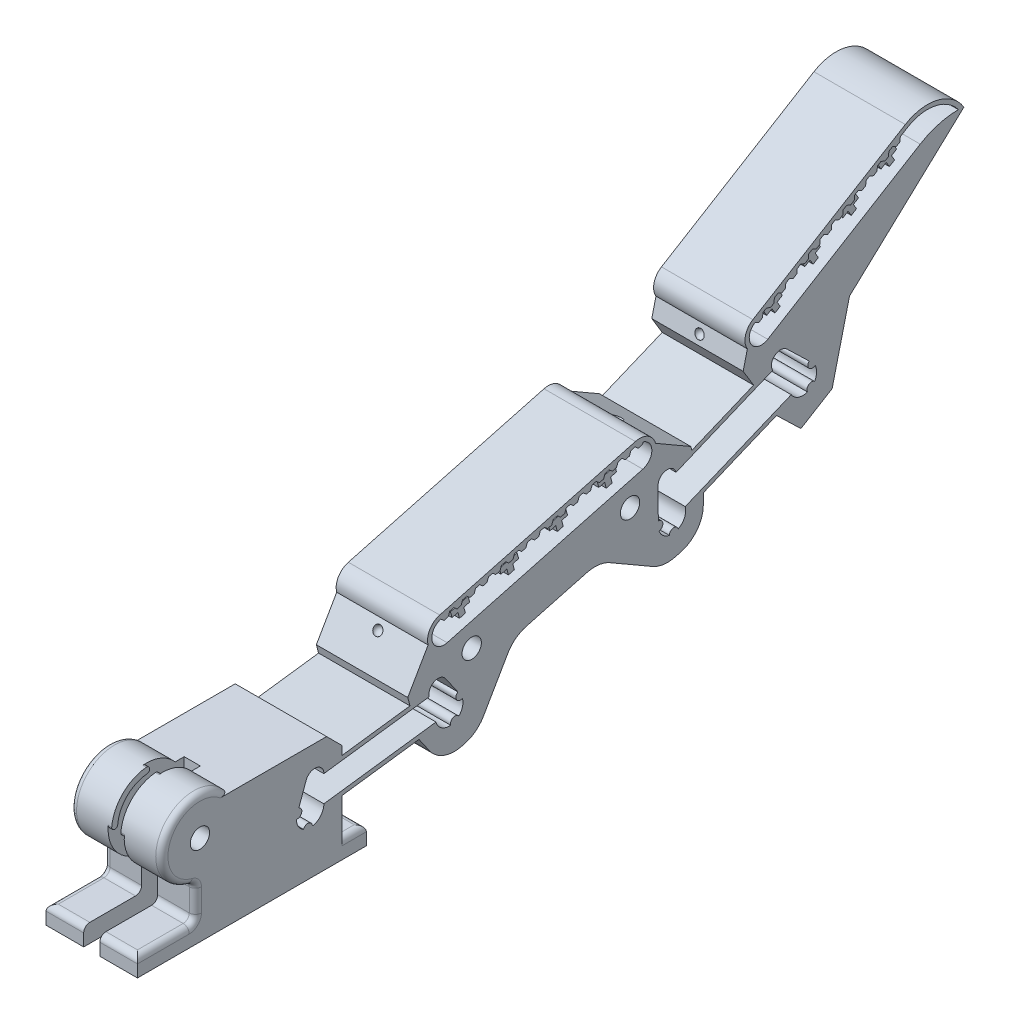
SolidWorks part; units mm, degrees
ref_plane "Front Plane" through (0, 0, 0) normal (0, 0, 1) x (1, 0, 0)
ref_plane "Top Plane" through (0, 0, 0) normal (0, 1, 0) x (1, 0, 0)
ref_plane "Right Plane" through (0, 0, 0) normal (1, 0, 0) x (0, 0, -1)
sketch "Sketch1" plane through (0, 0, 0) normal (0, 0, 1) x (1, 0, 0)
  line L0 (0, 0) -> (0, 9) construction
  line L1 (0, 0) -> (-7.5, 0) construction
  line L3 (-7.5, 9) -> (7.5, 9)
  line L4 (-7.5, 9) -> (-7.5, -9)
  line L5 (-7.5, -9) -> (7.5, -9)
  line L6 (7.5, 9) -> (7.5, -9)
  dimension "D1" = 15
  dimension "D2" = 18
extrude "Base" add sketch "Sketch1" along normal mid plane 29.5715
sketch "Sketch2" plane through (7.5, 0, 0) normal (1, 0, 0) x (0, 0, -1)
  line L0 (0, 9) -> (0, -9) construction
  line L1 (-14.7858, 9) -> (14.7858, 9) construction
  line L2 (-14.7858, -9) -> (14.7858, -9) construction
  line L3 (-14.7858, -9) -> (-14.7858, 9) construction
  line L4 (-18.7858, -9) -> (18.7858, -9)
  line L5 (-18.7858, -9) -> (-18.7858, -12)
  line L6 (-18.7858, -12) -> (18.7858, -12)
  line L7 (18.7858, -9) -> (18.7858, -12)
  dimension "D1" = 3
  dimension "D2" = 4
extrude "Base Tabs" add sketch "Sketch2" against normal up to surface (15 mm away)
sketch "Sketch3" plane through (7.5, 0, 0) normal (1, 0, 0) x (0, 0, -1)
  line L0 (0, 0) -> (14.7858, 0) construction
  line L1 (14.7858, -9) -> (14.7858, 9) construction
  line L2 (14.7858, 0) -> (26.6831, 1.5663) construction
  line L3 (26.6831, 1.5663) -> (73.1467, 14.0162) construction
  line L4 (73.1467, 14.0162) -> (84.2332, 18.6084) construction
  line L5 (84.2332, 18.6084) -> (113.331, 36.3123) construction
  line L6 (20.7344, 0.7832) -> (78.69, 16.3123) construction
  line L7 (78.69, 16.3123) -> (113.331, 36.3123) construction
  line L8 (14.7858, 2.8494) -> (25.9456, 4.3186)
  line L9 (14.7858, -2.8494) -> (27.4206, -1.186)
  line L10 (24.3537, 10.2596) -> (29.0125, -7.127) construction
  line L11 (25.9456, 4.3186) -> (24.3537, 10.2596)
  line L12 (24.3537, 10.2596) -> (70.8173, 22.7095)
  line L13 (27.4206, -1.186) -> (29.0125, -7.127)
  line L14 (29.0125, -7.127) -> (75.4761, 5.3229)
  line L15 (70.8173, 22.7095) -> (75.4761, 5.3229) construction
  line L16 (82.348, 21.7069) -> (86.1185, 15.5099) construction
  line L17 (75.4761, 5.3229) -> (74.0823, 10.5244)
  line L18 (72.2111, 17.508) -> (82.348, 21.7069)
  line L19 (70.8173, 22.7095) -> (72.2111, 17.508)
  line L20 (74.0823, 10.5244) -> (86.1185, 15.5099)
  line L21 (82.348, 21.7069) -> (79.5552, 26.2971)
  line L22 (79.5552, 26.2971) -> (108.653, 44.001)
  line L23 (108.653, 44.001) -> (118.009, 28.6236)
  line L24 (118.009, 28.6236) -> (88.9113, 10.9197)
  line L25 (88.9113, 10.9197) -> (86.1185, 15.5099)
  line L26 (14.7858, 2.8494) -> (14.7858, -2.8494)
  point P9 (20.7344, 0.7832)
  point P10 (78.69, 16.3123)
  dimension "D1" = 12
  dimension "D2" = 12
  dimension "D3" = 15
  dimension "D4" = 15
  dimension "D5" = 60
  dimension "D6" = 40
  dimension "D7" = 7.5
  dimension "D8" = 7.5
  dimension "D9" = 5.65
  dimension "D10" = 18
  dimension "D11" = 7.1681
  dimension "D12" = 18
extrude "Finger Frame" add sketch "Sketch3" against normal up to surface (15 mm away)
sketch "Sketch4" plane through (7.5, 0, 0) normal (1, 0, 0) x (0, 0, -1)
  line L0 (20.3657, 3.584) -> (21.1032, -2.0177) construction
  line L1 (25.9456, 4.3186) -> (14.7858, 2.8494) construction
  line L2 (14.7858, -2.8494) -> (27.4206, -1.186) construction
  line L3 (77.555, 18.9639) -> (79.8249, 13.6607) construction
  line L4 (82.348, 21.7069) -> (72.2111, 17.508) construction
  line L5 (82.7162, 21.1017) -> (85.4879, 22.2498)
  line L6 (82.348, 21.7069) -> (86.1185, 15.5099) construction
  line L7 (72.2111, 17.508) -> (74.0823, 10.5244) construction
  line L8 (14.7858, 2.8494) -> (14.7858, -2.8494) construction
  line L9 (25.9456, 4.3186) -> (27.4206, -1.186) construction
  line L10 (14.7858, 2.1433) -> (26.1284, 3.6366)
  line L11 (14.7858, -2.1433) -> (27.2378, -0.504)
  line L12 (14.7858, 0) -> (26.6831, 1.5663) construction
  line L13 (73.1467, 14.0162) -> (84.2332, 18.6084) construction
  line L14 (72.3938, 16.826) -> (82.7162, 21.1017)
  line L15 (73.8996, 11.2064) -> (85.7503, 16.1151)
  line L16 (14.7858, 2.1433) -> (11.8114, 1.7518)
  line L17 (14.7858, -2.1433) -> (11.8114, -2.5349)
  line L18 (8.9005, 2.2611) -> (7.4451, -1.771)
  line L19 (11.8114, 1.7518) -> (11.8114, -2.5349) construction
  line L20 (31.7826, 5.2735) -> (34.232, 1.7556)
  line L21 (27.2378, -0.504) -> (30.2122, -0.1124)
  line L22 (26.1284, 3.6366) -> (29.1027, 4.0282)
  line L23 (72.3938, 16.826) -> (69.6222, 15.678)
  line L24 (73.8996, 11.2064) -> (71.1279, 10.0583)
  line L25 (66.6733, 15.2817) -> (66.7046, 9.4638)
  line L26 (85.7503, 16.1151) -> (88.5219, 17.2631)
  line L27 (69.6222, 15.678) -> (71.1279, 10.0583) construction
  line L28 (85.4879, 22.2498) -> (88.5219, 17.2631) construction
  line L29 (87.812, 24.1077) -> (92.0082, 20.0501)
  arc A0 (11.8114, 1.7518) -> (8.9005, 2.2611) centre (10.3114, 1.7518) ccw
  arc A1 (11.8114, -2.5349) -> (7.4451, -1.771) centre (9.5614, -2.5349) cw
  arc A2 (29.1027, 4.0282) -> (31.7826, 5.2735) centre (30.5516, 4.4164) cw
  arc A3 (30.2122, -0.1124) -> (34.232, 1.7556) centre (32.3855, 0.4699) ccw
  arc A4 (69.6222, 15.678) -> (66.6733, 15.2817) centre (68.1733, 15.2898) ccw
  arc A5 (71.1279, 10.0583) -> (66.7046, 9.4638) centre (68.9546, 9.476) cw
  arc A6 (85.4879, 22.2498) -> (87.812, 24.1077) centre (86.7693, 23.0294) cw
  arc A7 (88.5219, 17.2631) -> (92.0082, 20.0501) centre (90.4441, 18.4326) ccw
  dimension "D5" = 1.5
  dimension "D6" = 2.25
  dimension "D1" = 0.7
  dimension "D2" = 0.7
  dimension "D3" = 3
extrude "Flexures" cut sketch "Sketch4" against normal through all
sketch "Sketch5" plane through (7.5, 0, 0) normal (1, 0, 0) x (0, 0, -1)
  line L0 (7.4451, -1.771) -> (11.8114, -2.5349) construction
  line L1 (9.6282, -2.1529) -> (9.1736, -4.7512) construction
  line L3 (20.4571, 2.89) -> (21.0118, -1.3237) construction
  line L4 (29.1027, 4.0282) -> (11.8114, 1.7518) construction
  line L5 (11.8114, -2.5349) -> (30.2122, -0.1124) construction
  line L6 (71.1279, 10.0583) -> (66.7046, 9.4638) construction
  line L7 (88.5219, 17.2631) -> (92.0082, 20.0501) construction
  line L8 (90.265, 18.6566) -> (91.849, 16.6752) construction
  line L9 (68.9163, 9.7611) -> (69.2543, 7.246) construction
  arc A0 (7.4451, -1.771) -> (11.8114, -2.5349) centre (9.5614, -2.5349) ccw construction
  circle A1 centre (9.1736, -4.7512) radius 0.75
  circle A2 centre (7.4451, -1.771) radius 0.75
  circle A3 centre (33.3337, -1.5705) radius 0.75
  circle A4 centre (34.232, 1.7556) radius 0.75
  arc A5 (88.5219, 17.2631) -> (92.0082, 20.0501) centre (90.4441, 18.4326) ccw construction
  arc A6 (66.7046, 9.4638) -> (71.1279, 10.0583) centre (68.9546, 9.476) ccw construction
  circle A7 centre (69.2543, 7.246) radius 0.75
  circle A8 centre (66.7046, 9.4638) radius 0.75
  circle A9 centre (91.849, 16.6752) radius 0.75
  circle A10 centre (92.0082, 20.0501) radius 0.75
  dimension "D1" = 1.5
  dimension "D2" = 1.5
extrude "Flexure Anchors" add sketch "Sketch5" against normal up to surface (15 mm away)
sketch "Sketch6" plane through (7.5, 0, 0) normal (1, 0, 0) x (0, 0, -1)
  line L0 (25.8415, 4.7073) -> (66.7198, 15.6606) construction
  line L1 (70.8173, 22.7095) -> (24.3537, 10.2596) construction
  line L2 (29.0125, -7.127) -> (75.4761, 5.3229) construction
  line L3 (47.5855, 16.4846) -> (52.2443, -0.9021) construction
  line L4 (25.5772, 5.6935) -> (24.3537, 10.2596)
  line L5 (35.2858, 6.0757) -> (19.6817, 15.0847) construction
  line L6 (33.8034, 2.3711) -> (31.7826, 5.2735) construction
  line L7 (25.5772, 5.6935) -> (28.9199, 11.4831)
  line L8 (24.3537, 10.2596) -> (25.9456, 4.3186) construction
  line L9 (24.3537, 10.2596) -> (28.9199, 11.4831)
  line L10 (72.0408, 18.1434) -> (70.8173, 22.7095)
  line L11 (70.8173, 22.7095) -> (66.2512, 21.486)
  line L12 (72.0408, 18.1434) -> (66.2512, 21.486)
  line L13 (70.8173, 22.7095) -> (79.5552, 26.2971) construction
  line L14 (75.1863, 24.5033) -> (77.2795, 19.6075) construction
  line L15 (82.348, 21.7069) -> (72.2111, 17.508) construction
  line L16 (79.5552, 26.2971) -> (80.6304, 24.53)
  line L17 (79.5552, 26.2971) -> (82.348, 21.7069) construction
  line L18 (80.6304, 24.53) -> (81.3223, 27.3723)
  line L19 (108.653, 44.001) -> (79.5552, 26.2971) construction
  line L20 (81.3223, 27.3723) -> (79.5552, 26.2971)
  line L21 (-14.7858, -9) -> (-14.7858, 9) construction
  line L22 (-14.7858, 9) -> (14.7858, 9) construction
  line L23 (-14.7858, 2.75) -> (-14.7858, 9)
  line L24 (-14.7858, 9) -> (-8.5358, 9)
  line L25 (20.3657, 3.584) -> (21.0118, -1.3237) construction
  line L26 (25.9456, 4.3186) -> (14.7858, 2.8494) construction
  line L27 (11.8114, -2.5349) -> (30.2122, -0.1124) construction
  line L28 (14.7857, 4.2728) -> (14.7858, 9)
  line L29 (14.7857, 4.2728) -> (10.0585, 9)
  line L30 (14.7858, 9) -> (10.0585, 9)
  line L31 (20.6887, 1.1302) -> (33.4937, 2.816) construction
  line L32 (66.6945, 11.3436) -> (90.7203, 21.2954) construction
  line L33 (66.6733, 15.2817) -> (66.7006, 10.2138) construction
  line L34 (91.469, 20.5714) -> (87.812, 24.1077) construction
  line L35 (71.1279, 10.0583) -> (88.5219, 17.2631) construction
  line L36 (85.4879, 22.2498) -> (69.6222, 15.678) construction
  circle A0 centre (36.0795, 7.4505) radius 1.5875
  arc A1 (31.7826, 5.2735) -> (29.1027, 4.0282) centre (30.5516, 4.4164) ccw construction
  circle A2 centre (62.067, 14.4139) radius 1.5875
  circle A3 centre (-8.5358, 2.75) radius 6.25 construction
  circle A4 centre (-8.5358, 2.75) radius 4.75 construction
  circle A5 centre (-8.5358, 2.75) radius 1.5875
  arc A6 (-8.5358, 9) -> (-14.7858, 2.75) centre (-8.5358, 2.75) ccw
  arc A7 (69.6222, 15.678) -> (66.6733, 15.2817) centre (68.1733, 15.2898) ccw construction
  point P73 (28.1699, 10.1841)
  point P77 (80.9675, 25.9148)
  dimension "D1" = 3.175
  dimension "D2" = 8
  dimension "D5" = 12.5
  dimension "D6" = 3.175
  dimension "D7" = 9.5
  dimension "D3" = 45
  dimension "D4" = 1.5
  dimension "D8" = 1.5
  dimension "D9" = 8
extrude "Pin Holes" cut sketch "Sketch6" against normal through all
sketch "Sketch8" plane through (0, -9.6519, -16.7176) normal (0, 0.5, 0.866) x (1, 0, 0)
  line L0 (0, 24.4046) -> (0, 17.7193) construction
  line L1 (7.5, 24.4046) -> (-7.5, 24.4046) construction
  line L2 (-7.5, 17.7193) -> (7.5, 17.7193) construction
  circle A0 centre (0, 22.9046) radius 0.75
  dimension "D1" = 1.5
  dimension "D2" = 1.5
extrude "Tendon Route 1" cut sketch "Sketch8" against normal blind 0.75
sketch "Sketch9" plane through (0, -17.1586, -70.4813) normal (0, 0.2365, 0.9716) x (1, 0, 0)
  line L0 (0, 45.8315) -> (0, 42.9062) construction
  line L1 (7.5, 45.8315) -> (-7.5, 45.8315) construction
  line L2 (-7.5, 42.9062) -> (7.5, 42.9062) construction
  circle A0 centre (0, 44.3315) radius 0.75
  dimension "D1" = 1.5
  dimension "D2" = 1.5
extrude "Tendon Route 2" cut sketch "Sketch9" against normal blind 0.75
sketch "Sketch10" plane through (0, 44.8021, -25.8665) normal (0, 0.866, -0.5) x (1, 0, 0)
  line L0 (0, 46.6322) -> (0, 53.3175) construction
  line L1 (-7.5, 46.6322) -> (7.5, 46.6322) construction
  line L2 (7.5, 53.3175) -> (-7.5, 53.3175) construction
  circle A0 centre (0, 48.1322) radius 0.75
  dimension "D1" = 1.5
  dimension "D2" = 1.5
extrude "Tendon Route 3" cut sketch "Sketch10" against normal blind 0.75
sketch "Sketch11" plane through (7.5, 0, 0) normal (1, 0, 0) x (0, 0, -1)
  line L0 (-3.7755, 6.8) -> (-8.5358, 6.8) construction
  line L1 (14.7858, 9) -> (-8.5357, 9)
  line L2 (14.7858, 9) -> (14.7858, 6.8)
  line L3 (14.7858, 6.8) -> (-3.7755, 6.8)
  line L5 (14.7858, 2.8494) -> (14.7858, 4.2728) construction
  line L6 (-8.5358, 9) -> (10.0585, 9) construction
  circle A0 centre (-8.5358, 2.75) radius 4.75 construction
  circle A1 centre (-8.5358, 2.75) radius 4.05 construction
  arc A2 (-8.5357, 9) -> (-3.7755, 6.8) centre (-8.5358, 2.75) cw
  dimension "D1" = 9.5
  dimension "D2" = 0.7
extrude "Tendon Clearance" cut sketch "Sketch11" against normal through all
fillet "Tendon Route Ports" radius 0.75 3 edges at (0, 20.4615, -66.5257) (0, 25.0087, -81.5188) (0, 9.1596, -28.4444)
sketch "Sketch13" plane through (7.5, 0, 0) normal (1, 0, 0) x (0, 0, -1)
  line L0 (30.8291, 14.79) -> (62.9444, 23.3952)
  line L1 (66.2512, 21.486) -> (28.9199, 11.4831) construction
  line L2 (28.9199, 11.4831) -> (66.2512, 21.486)
  line L3 (82.2255, 31.0823) -> (107.2496, 46.3076)
  line L4 (108.653, 44.001) -> (81.3223, 27.3723) construction
  line L5 (30.8291, 14.79) -> (31.5279, 12.182) construction
  line L6 (82.2255, 31.0823) -> (83.629, 28.7757) construction
  line L7 (118.009, 28.6236) -> (108.653, 44.001) construction
  line L8 (81.3223, 27.3723) -> (108.653, 44.001)
  line L9 (108.653, 44.001) -> (114.5265, 34.3474)
  arc A0 (28.9199, 11.4831) -> (30.8291, 14.79) centre (31.5279, 12.182) cw
  arc A1 (66.2512, 21.486) -> (62.9444, 23.3952) centre (63.6432, 20.7872) ccw
  arc A2 (81.3223, 27.3723) -> (82.2255, 31.0823) centre (83.629, 28.7757) cw
  arc A3 (107.2496, 46.3076) -> (114.5265, 34.3474) centre (110.888, 40.3275) cw
  dimension "D2" = 7
  dimension "D1" = 2.7
extrude "Finger Pad Outline" add sketch "Sketch13" against normal up to surface (15 mm away)
sketch "Sketch12" plane through (7.5, 0, 0) normal (1, 0, 0) x (0, 0, -1)
  line L0 (27.4206, -1.186) -> (31.157, -6.5524)
  line L1 (29.0125, -7.127) -> (75.4761, 5.3229) construction
  line L2 (74.0823, 10.5244) -> (74.1123, 4.9575)
  line L3 (86.1185, 15.5099) -> (90.1106, 11.6494)
  line L4 (88.9113, 10.9197) -> (118.009, 28.6236) construction
  line L5 (91.469, 20.5714) -> (87.812, 24.1077) construction
  line L6 (66.6733, 15.2817) -> (66.7006, 10.2138) construction
  line L7 (33.8034, 2.3711) -> (31.7826, 5.2735) construction
  line L8 (27.4206, -1.186) -> (29.0125, -7.127)
  line L9 (29.0125, -7.127) -> (31.157, -6.5524)
  line L10 (74.0823, 10.5244) -> (75.4761, 5.3229)
  line L11 (75.4761, 5.3229) -> (74.1123, 4.9575)
  line L12 (86.1185, 15.5099) -> (88.9113, 10.9197)
  line L13 (88.9113, 10.9197) -> (90.1106, 11.6494)
  line L14 (29.1027, 4.0282) -> (30.2122, -0.1124) construction
  line L15 (69.6222, 15.678) -> (71.1279, 10.0583) construction
  line L16 (29.6574, 1.9579) -> (70.3751, 12.8681) construction
  line L17 (62.9444, 23.3952) -> (30.8291, 14.79) construction
  line L19 (46.8867, 19.0926) -> (52.2443, -0.9021) construction
  line L21 (95.2364, 14.7681) -> (98.0933, 26.503)
  line L22 (36.9526, -4.9995) -> (43.0396, 5.5436)
  line L23 (25.5772, 5.6935) -> (28.9199, 11.4831) construction
  line L24 (43.0396, 5.5436) -> (56.9928, 9.2824)
  line L25 (36.9526, -4.9995) -> (67.536, 3.1953)
  line L26 (67.536, 3.1953) -> (56.9928, 9.2824)
  line L27 (31.157, -6.5524) -> (36.9526, -4.9995) construction
  line L28 (90.1106, 11.6494) -> (95.2364, 14.7681) construction
  line L29 (116.8681, 43.966) -> (123.9891, 32.2621)
  line L30 (123.9891, 32.2621) -> (95.2364, 14.7681)
  line L31 (98.0933, 26.503) -> (116.8681, 43.966)
  line L32 (80.6304, 24.53) -> (81.3223, 27.3723) construction
  line L33 (85.4879, 22.2498) -> (88.5219, 17.2631) construction
  line L34 (87.0049, 19.7565) -> (119.5501, 39.5579) construction
  arc A1 (114.5265, 34.3474) -> (107.2496, 46.3076) centre (110.888, 40.3275) ccw construction
  point P51 (50.0162, 7.413)
  dimension "D1" = 6
extrude "Finger Outline" cut sketch "Sketch12" against normal through all
sketch "Sketch14" plane through (7.5, 0, 0) normal (1, 0, 0) x (0, 0, -1)
  line L0 (30.8291, 14.79) -> (31.5279, 12.182) construction
  line L1 (46.8867, 19.0926) -> (50.0162, 7.413) construction
  line L2 (62.9444, 23.3952) -> (30.8291, 14.79) construction
  line L3 (56.9928, 9.2824) -> (43.0396, 5.5436) construction
  line L4 (62.9444, 23.3952) -> (63.6432, 20.7872) construction
  line L5 (31.0102, 14.1138) -> (63.1255, 22.7191)
  line L6 (32.0455, 10.2501) -> (64.1608, 18.8554)
  line L7 (107.2496, 46.3076) -> (111.6355, 39.099) construction
  line L9 (107.2496, 46.3076) -> (82.2255, 31.0823) construction
  line L10 (82.5894, 30.4843) -> (107.6134, 45.7096)
  line L11 (84.6685, 27.0671) -> (109.6925, 42.2924)
  line L12 (115.9544, 44.0721) -> (111.2641, 39.7095) construction
  line L13 (116.8681, 43.966) -> (98.0933, 26.503) construction
  circle A0 centre (31.5279, 12.182) radius 2 construction
  arc A1 (30.8291, 14.79) -> (28.9199, 11.4831) centre (31.5279, 12.182) ccw construction
  circle A2 centre (63.6432, 20.7872) radius 2 construction
  arc A3 (31.0102, 14.1138) -> (32.0455, 10.2501) centre (31.5279, 12.182) ccw
  arc A4 (63.1255, 22.7191) -> (64.1608, 18.8554) centre (63.6432, 20.7872) cw
  circle A5 centre (83.629, 28.7757) radius 2 construction
  arc A6 (82.2255, 31.0823) -> (81.3223, 27.3723) centre (83.629, 28.7757) ccw construction
  arc A7 (82.5894, 30.4843) -> (84.6685, 27.0671) centre (83.629, 28.7757) ccw
  arc A8 (107.6134, 45.7096) -> (115.9544, 44.0721) centre (110.888, 40.3275) cw
  arc A9 (109.6925, 42.2924) -> (115.9544, 44.0721) centre (116.0426, 31.8555) cw
  dimension "D1" = 0.7
  dimension "D2" = 0.7
  dimension "D3" = 0.7
extrude "Finger Pad Cavity" cut sketch "Sketch14" against normal through all and the other way through all contours A4 L5 A3 L6 | L11 A9 A8 L10 A7
sketch "Sketch15" plane through (0, 0, 0) normal (1, 0, 0) x (0, 0, -1)
  line L0 (35.4875, 9.6601) -> (61.475, 16.6234)
  line L2 (34.2022, 6.1435) -> (39.2228, -1.0673)
  line L3 (43.0396, 5.5436) -> (36.9526, -4.9995) construction
  line L4 (31.157, -6.5524) -> (27.4206, -1.186) construction
  line L5 (48.4812, 13.1418) -> (54.6807, -9.9949) construction
  line L6 (64.3463, 14.2206) -> (63.6038, 5.4656)
  line L7 (39.2228, -1.0673) -> (63.6038, 5.4656)
  line L8 (88.483, 27.6321) -> (96.4845, 19.8947)
  line L9 (88.483, 27.6321) -> (107.0433, 38.9247)
  line L10 (107.0433, 38.9247) -> (115.0447, 31.1872)
  line L11 (115.0447, 31.1872) -> (96.4845, 19.8947)
  line L12 (98.0933, 26.503) -> (95.2364, 14.7681) construction
  line L13 (109.6925, 42.2924) -> (84.6685, 27.0671) construction
  line L14 (90.1106, 11.6494) -> (86.1185, 15.5099) construction
  line L15 (91.469, 20.5714) -> (87.812, 24.1077) construction
  line L16 (116.8681, 43.966) -> (98.0933, 26.503) construction
  circle A0 centre (36.0795, 7.4505) radius 2.2875 construction
  circle A1 centre (62.067, 14.4139) radius 2.2875 construction
  circle A2 centre (36.0795, 7.4505) radius 1.5875 construction
  arc A3 (35.4875, 9.6601) -> (34.2022, 6.1435) centre (36.0795, 7.4505) ccw
  arc A4 (61.475, 16.6234) -> (64.3463, 14.2206) centre (62.067, 14.4139) cw
  dimension "D1" = 0.7
  dimension "D2" = 1.5
  dimension "D3" = 3
  dimension "D4" = 3
extrude "Back Cutaway" cut sketch "Sketch15" against normal mid plane 9
sketch "Sketch7" plane through (0, -12, 0) normal (0, 1, 0) x (1, 0, 0)
  line L0 (0, 0) -> (0, -8.5358) construction
  line L1 (7.5, -10.1233) -> (7.5, -6.9482) construction
  line L4 (-1.325, -2.2857) -> (1.325, -2.2857)
  line L5 (-1.325, -2.2857) -> (-1.325, -18.7857)
  line L6 (-1.325, -18.7857) -> (1.325, -18.7857)
  line L7 (1.325, -2.2857) -> (1.325, -18.7857)
  line L8 (0, -8.5358) -> (7.5, -8.5358) construction
  dimension "D1" = 2.65
  dimension "D2" = 6.25
  dimension "D3" = 10.25
extrude "Pulley Slot" cut sketch "Sketch7" along normal through all contours L4 L7 L5 M13
sketch "Sketch16" plane through (7.5, 0, 0) normal (1, 0, 0) x (0, 0, -1)
  line L0 (-14.7858, 2.75) -> (-8.5358, 2.75) construction
  line L1 (-8.5358, 2.75) -> (-8.5358, 9) construction
  line L2 (-14.7858, 2.75) -> (-13.7858, 2.75)
  line L3 (-8.5358, 9) -> (-8.5357, 8)
  arc A0 (-14.7858, 2.75) -> (-8.5358, 9) centre (-8.5358, 2.75) cw
  arc A1 (-3.7755, 6.8) -> (-14.7858, 2.75) centre (-8.5358, 2.75) ccw construction
  arc A2 (-8.5357, 8) -> (-13.7858, 2.75) centre (-8.5358, 2.75) ccw
  dimension "D1" = 1
extrude "Pulley Cover" add sketch "Sketch16" against normal up to surface (15 mm away)
sketch "Sketch17" plane through (0, -12, 0) normal (0, -1, 0) x (1, 0, 0)
  line L0 (-1.325, 18.7858) -> (1.325, 18.7858) construction
  line L1 (0, 18.7858) -> (0, 2.2857) construction
  line L2 (-1.325, 2.2857) -> (1.325, 2.2857) construction
  line L4 (-0.75, 18.7858) -> (0.75, 18.7858)
  line L5 (-0.75, 18.7858) -> (-0.75, 2.2857)
  line L6 (-0.75, 2.2857) -> (0.75, 2.2857)
  line L7 (0.75, 18.7858) -> (0.75, 2.2857)
  dimension "D1" = 1.5
extrude "Pulley Cover Cutaway" cut sketch "Sketch17" against normal through all
sketch "Sketch18" plane through (0, 0, 0) normal (1, 0, 0) x (0, 0, -1)
  line L0 (31.0102, 14.1138) -> (32.0455, 10.2501) construction
  line L1 (31.0102, 14.1138) -> (47.0679, 18.4164) construction
  line L2 (39.0391, 16.2651) -> (40.0743, 12.4014) construction
  line L3 (31.5279, 12.182) -> (39.5567, 14.3333) construction
  line L4 (35.5423, 13.2576) -> (36.0599, 11.3258) construction
  line L5 (64.1608, 18.8554) -> (32.0455, 10.2501) construction
  line L6 (39.5567, 14.3333) -> (47.5855, 16.4846) construction
  line L7 (43.5711, 15.4089) -> (44.0887, 13.4771) construction
  line L8 (34.0934, 12.8694) -> (34.3522, 11.9035)
  line L9 (34.3522, 11.9035) -> (35.3181, 12.1623)
  line L10 (35.3181, 12.1623) -> (35.577, 11.1964)
  line L11 (63.1255, 22.7191) -> (64.1608, 18.8554) construction
  line L12 (47.0679, 18.4164) -> (48.1032, 14.5527) construction
  line L13 (63.1255, 22.7191) -> (31.0102, 14.1138) construction
  line L14 (35.577, 11.1964) -> (36.5429, 11.4552)
  line L15 (36.5429, 11.4552) -> (36.2841, 12.4211)
  line L17 (36.2841, 12.4211) -> (37.25, 12.6799)
  line L18 (37.25, 12.6799) -> (36.9912, 13.6458)
  line L19 (36.9912, 13.6458) -> (34.0934, 12.8694)
  line L20 (43.5711, 15.4089) -> (44.0887, 13.4771) construction
  line L21 (42.1222, 15.0207) -> (45.02, 15.7972)
  line L22 (42.381, 14.0548) -> (42.1222, 15.0207)
  line L23 (43.347, 14.3136) -> (42.381, 14.0548)
  line L24 (43.6058, 13.3477) -> (43.347, 14.3136)
  line L25 (44.5717, 13.6065) -> (43.6058, 13.3477)
  line L26 (44.3129, 14.5724) -> (44.5717, 13.6065)
  line L27 (45.2788, 14.8312) -> (44.3129, 14.5724)
  line L28 (45.02, 15.7972) -> (45.2788, 14.8312)
  line L29 (51.5999, 17.5602) -> (52.1176, 15.6284) construction
  line L30 (51.5999, 17.5602) -> (52.1176, 15.6284) construction
  line L31 (50.151, 17.172) -> (50.4099, 16.2061)
  line L32 (50.4099, 16.2061) -> (51.3758, 16.4649)
  line L33 (51.3758, 16.4649) -> (51.6346, 15.499)
  line L34 (51.6346, 15.499) -> (52.6005, 15.7578)
  line L35 (52.6005, 15.7578) -> (52.3417, 16.7237)
  line L36 (52.3417, 16.7237) -> (53.3076, 16.9826)
  line L37 (53.3076, 16.9826) -> (53.0488, 17.9485)
  line L38 (53.0488, 17.9485) -> (50.151, 17.172)
  line L39 (59.6288, 19.7116) -> (60.1464, 17.7797) construction
  line L40 (58.1799, 19.3233) -> (61.0776, 20.0998)
  line L41 (58.4387, 18.3574) -> (58.1799, 19.3233)
  line L42 (59.4046, 18.6162) -> (58.4387, 18.3574)
  line L43 (59.6634, 17.6503) -> (59.4046, 18.6162)
  line L44 (60.6294, 17.9091) -> (59.6634, 17.6503)
  line L45 (60.3705, 18.875) -> (60.6294, 17.9091)
  line L46 (61.3365, 19.1339) -> (60.3705, 18.875)
  line L47 (61.0776, 20.0998) -> (61.3365, 19.1339)
  line L48 (82.5894, 30.4843) -> (84.6685, 27.0671) construction
  line L49 (107.6134, 45.7096) -> (109.6925, 42.2924) construction
  line L50 (83.629, 28.7757) -> (89.885, 32.582) construction
  line L51 (95.1014, 38.0969) -> (97.1805, 34.6797) construction
  line L52 (107.6134, 45.7096) -> (82.5894, 30.4843) construction
  line L53 (109.6925, 42.2924) -> (84.6685, 27.0671) construction
  line L54 (82.5894, 30.4843) -> (95.1014, 38.0969) construction
  line L55 (88.8454, 34.2906) -> (90.9245, 30.8734) construction
  line L56 (86.757, 30.6788) -> (87.7965, 28.9702) construction
  line L57 (85.4755, 29.8992) -> (85.9953, 29.0449)
  line L58 (85.9953, 29.0449) -> (86.8496, 29.5647)
  line L59 (86.8496, 29.5647) -> (87.3694, 28.7104)
  line L60 (87.3694, 28.7104) -> (88.2237, 29.2301)
  line L61 (88.2237, 29.2301) -> (87.7039, 30.0844)
  line L62 (87.7039, 30.0844) -> (88.5582, 30.6042)
  line L63 (88.5582, 30.6042) -> (88.0384, 31.4585)
  line L64 (88.0384, 31.4585) -> (85.4755, 29.8992)
  line L65 (93.013, 34.4852) -> (94.0525, 32.7766) construction
  line L66 (91.7315, 33.7055) -> (94.2944, 35.2648)
  line L67 (92.2513, 32.8512) -> (91.7315, 33.7055)
  line L68 (93.1056, 33.371) -> (92.2513, 32.8512)
  line L69 (93.6254, 32.5167) -> (93.1056, 33.371)
  line L70 (94.4797, 33.0365) -> (93.6254, 32.5167)
  line L71 (93.9599, 33.8908) -> (94.4797, 33.0365)
  line L72 (94.8142, 34.4105) -> (93.9599, 33.8908)
  line L73 (94.2944, 35.2648) -> (94.8142, 34.4105)
  line L74 (99.269, 38.2915) -> (100.3085, 36.5829) construction
  line L75 (97.9875, 37.5118) -> (98.5073, 36.6575)
  line L76 (98.5073, 36.6575) -> (99.3616, 37.1773)
  line L77 (99.3616, 37.1773) -> (99.8814, 36.323)
  line L78 (99.8814, 36.323) -> (100.7357, 36.8428)
  line L79 (100.7357, 36.8428) -> (100.2159, 37.6971)
  line L80 (100.2159, 37.6971) -> (101.0702, 38.2169)
  line L81 (101.0702, 38.2169) -> (100.5504, 39.0712)
  line L82 (100.5504, 39.0712) -> (97.9875, 37.5118)
  line L83 (105.525, 42.0978) -> (106.5645, 40.3892) construction
  line L84 (104.2435, 41.3182) -> (106.8064, 42.8775)
  line L85 (104.7633, 40.4639) -> (104.2435, 41.3182)
  line L86 (105.6176, 40.9836) -> (104.7633, 40.4639)
  line L87 (106.1374, 40.1293) -> (105.6176, 40.9836)
  line L88 (106.9917, 40.6491) -> (106.1374, 40.1293)
  line L89 (106.4719, 41.5034) -> (106.9917, 40.6491)
  line L90 (107.3262, 42.0232) -> (106.4719, 41.5034)
  line L91 (106.8064, 42.8775) -> (107.3262, 42.0232)
extrude "Pad Hooks Proximal" add sketch "Sketch18" along normal mid plane 12
sketch "Sketch19" plane through (7.5, 0, 0) normal (1, 0, 0) x (0, 0, -1)
  line L0 (30.8291, 14.79) -> (31.0102, 14.1138) construction
  line L1 (31.0102, 14.1138) -> (31.5453, 13.6625)
  line L2 (31.5453, 13.6625) -> (32.2214, 13.8436)
  line L3 (85.1092, 31.3449) -> (85.7072, 31.7088)
  line L4 (32.2214, 13.8436) -> (32.4591, 14.502)
  line L5 (63.1255, 22.7191) -> (31.0102, 14.1138) construction
  line L6 (32.4591, 14.502) -> (31.0102, 14.1138)
  line L7 (34.5841, 15.0714) -> (33.1353, 14.6832)
  line L8 (33.1353, 14.6832) -> (33.6703, 14.2319)
  line L9 (33.6703, 14.2319) -> (34.3465, 14.413)
  line L10 (34.3465, 14.413) -> (34.5841, 15.0714)
  line L11 (36.7092, 15.6408) -> (35.2603, 15.2526)
  line L12 (35.2603, 15.2526) -> (35.7953, 14.8013)
  line L13 (35.7953, 14.8013) -> (36.4715, 14.9824)
  line L14 (36.4715, 14.9824) -> (36.7092, 15.6408)
  line L15 (38.8342, 16.2102) -> (37.3853, 15.822)
  line L16 (37.3853, 15.822) -> (37.9204, 15.3707)
  line L17 (37.9204, 15.3707) -> (38.5965, 15.5518)
  line L18 (38.5965, 15.5518) -> (38.8342, 16.2102)
  line L19 (40.9593, 16.7796) -> (39.5104, 16.3914)
  line L20 (39.5104, 16.3914) -> (40.0454, 15.9401)
  line L21 (40.0454, 15.9401) -> (40.7216, 16.1212)
  line L22 (40.7216, 16.1212) -> (40.9593, 16.7796)
  line L23 (43.0843, 17.349) -> (41.6354, 16.9608)
  line L24 (41.6354, 16.9608) -> (42.1705, 16.5095)
  line L25 (42.1705, 16.5095) -> (42.8466, 16.6906)
  line L26 (42.8466, 16.6906) -> (43.0843, 17.349)
  line L27 (45.2093, 17.9184) -> (43.7604, 17.5302)
  line L28 (43.7604, 17.5302) -> (44.2955, 17.0789)
  line L29 (44.2955, 17.0789) -> (44.9716, 17.26)
  line L30 (44.9716, 17.26) -> (45.2093, 17.9184)
  line L31 (47.3344, 18.4878) -> (45.8855, 18.0996)
  line L32 (45.8855, 18.0996) -> (46.4205, 17.6483)
  line L33 (46.4205, 17.6483) -> (47.0967, 17.8294)
  line L34 (47.0967, 17.8294) -> (47.3344, 18.4878)
  line L35 (49.4594, 19.0572) -> (48.0105, 18.669)
  line L36 (48.0105, 18.669) -> (48.5456, 18.2177)
  line L37 (48.5456, 18.2177) -> (49.2217, 18.3988)
  line L38 (49.2217, 18.3988) -> (49.4594, 19.0572)
  line L39 (51.5844, 19.6267) -> (50.1356, 19.2384)
  line L40 (50.1356, 19.2384) -> (50.6706, 18.7871)
  line L41 (50.6706, 18.7871) -> (51.3468, 18.9682)
  line L42 (51.3468, 18.9682) -> (51.5844, 19.6267)
  line L43 (53.7095, 20.1961) -> (52.2606, 19.8078)
  line L44 (52.2606, 19.8078) -> (52.7956, 19.3565)
  line L45 (52.7956, 19.3565) -> (53.4718, 19.5376)
  line L46 (53.4718, 19.5376) -> (53.7095, 20.1961)
  line L47 (55.8345, 20.7655) -> (54.3856, 20.3772)
  line L48 (54.3856, 20.3772) -> (54.9207, 19.9259)
  line L49 (54.9207, 19.9259) -> (55.5968, 20.107)
  line L50 (55.5968, 20.107) -> (55.8345, 20.7655)
  line L51 (57.9596, 21.3349) -> (56.5107, 20.9466)
  line L52 (56.5107, 20.9466) -> (57.0457, 20.4953)
  line L53 (57.0457, 20.4953) -> (57.7219, 20.6764)
  line L54 (57.7219, 20.6764) -> (57.9596, 21.3349)
  line L55 (60.0846, 21.9043) -> (58.6357, 21.516)
  line L56 (58.6357, 21.516) -> (59.1708, 21.0647)
  line L57 (59.1708, 21.0647) -> (59.8469, 21.2458)
  line L58 (59.8469, 21.2458) -> (60.0846, 21.9043)
  line L59 (62.2096, 22.4737) -> (60.7607, 22.0854)
  line L60 (60.7607, 22.0854) -> (61.2958, 21.6341)
  line L61 (61.2958, 21.6341) -> (61.9719, 21.8153)
  line L62 (61.9719, 21.8153) -> (62.2096, 22.4737)
  line L63 (64.3347, 23.0431) -> (62.8858, 22.6548)
  line L64 (62.8858, 22.6548) -> (63.4208, 22.2035)
  line L65 (63.4208, 22.2035) -> (64.097, 22.3847)
  line L66 (64.097, 22.3847) -> (64.3347, 23.0431)
  line L67 (82.2255, 31.0823) -> (82.5894, 30.4843) construction
  line L68 (82.5894, 30.4843) -> (83.2297, 30.2014)
  line L69 (83.2297, 30.2014) -> (83.8277, 30.5653)
  line L70 (83.8277, 30.5653) -> (83.8708, 31.2639)
  line L71 (107.6134, 45.7096) -> (82.5894, 30.4843) construction
  line L72 (83.8708, 31.2639) -> (82.5894, 30.4843)
  line L73 (84.4689, 31.6278) -> (85.1092, 31.3449)
  line L74 (85.7503, 32.4075) -> (84.4689, 31.6278)
  line L75 (85.7072, 31.7088) -> (85.7503, 32.4075)
  line L76 (86.9886, 32.4885) -> (87.5866, 32.8523)
  line L77 (86.3483, 32.7713) -> (86.9886, 32.4885)
  line L78 (87.6298, 33.551) -> (86.3483, 32.7713)
  line L79 (87.5866, 32.8523) -> (87.6298, 33.551)
  line L80 (88.8681, 33.632) -> (89.4661, 33.9958)
  line L81 (88.2278, 33.9148) -> (88.8681, 33.632)
  line L82 (89.5092, 34.6945) -> (88.2278, 33.9148)
  line L83 (89.4661, 33.9958) -> (89.5092, 34.6945)
  line L84 (90.7475, 34.7755) -> (91.3456, 35.1393)
  line L85 (90.1072, 35.0583) -> (90.7475, 34.7755)
  line L86 (91.3887, 35.838) -> (90.1072, 35.0583)
  line L87 (91.3456, 35.1393) -> (91.3887, 35.838)
  line L88 (92.627, 35.919) -> (93.225, 36.2829)
  line L89 (91.9867, 36.2019) -> (92.627, 35.919)
  line L90 (93.2681, 36.9815) -> (91.9867, 36.2019)
  line L91 (93.225, 36.2829) -> (93.2681, 36.9815)
  line L92 (94.5065, 37.0625) -> (95.1045, 37.4264)
  line L93 (93.8662, 37.3454) -> (94.5065, 37.0625)
  line L94 (95.1476, 38.125) -> (93.8662, 37.3454)
  line L95 (95.1045, 37.4264) -> (95.1476, 38.125)
  line L96 (96.3859, 38.2061) -> (96.9839, 38.5699)
  line L97 (95.7456, 38.4889) -> (96.3859, 38.2061)
  line L98 (97.0271, 39.2686) -> (95.7456, 38.4889)
  line L99 (96.9839, 38.5699) -> (97.0271, 39.2686)
  line L100 (98.2654, 39.3496) -> (98.8634, 39.7134)
  line L101 (97.6251, 39.6324) -> (98.2654, 39.3496)
  line L102 (98.9065, 40.4121) -> (97.6251, 39.6324)
  line L103 (98.8634, 39.7134) -> (98.9065, 40.4121)
  line L104 (100.1448, 40.4931) -> (100.7429, 40.8569)
  line L105 (99.5045, 40.7759) -> (100.1448, 40.4931)
  line L106 (100.786, 41.5556) -> (99.5045, 40.7759)
  line L107 (100.7429, 40.8569) -> (100.786, 41.5556)
  line L108 (102.0243, 41.6366) -> (102.6223, 42.0004)
  line L109 (101.384, 41.9194) -> (102.0243, 41.6366)
  line L110 (102.6654, 42.6991) -> (101.384, 41.9194)
  line L111 (102.6223, 42.0004) -> (102.6654, 42.6991)
  line L112 (103.9038, 42.7801) -> (104.5018, 43.144)
  line L113 (103.2635, 43.063) -> (103.9038, 42.7801)
  line L114 (104.5449, 43.8426) -> (103.2635, 43.063)
  line L115 (104.5018, 43.144) -> (104.5449, 43.8426)
  line L116 (105.7832, 43.9236) -> (106.3812, 44.2875)
  line L117 (105.1429, 44.2065) -> (105.7832, 43.9236)
  line L118 (106.4244, 44.9862) -> (105.1429, 44.2065)
  line L119 (106.3812, 44.2875) -> (106.4244, 44.9862)
  dimension "D1" = 1.5
  dimension "D3" = 0.7
  dimension "D2" = 0.7
  dimension "D4" = 1.5
  dimension "D5" = 16
extrude "Ridges" add sketch "Sketch19" against normal up to surface (15 mm away)
sketch "Sketch20" plane through (7.5, 0, 0) normal (1, 0, 0) x (0, 0, -1)
  line L0 (8.9005, 2.2611) -> (7.6997, -1.0655) construction
  line L1 (29.1027, 4.0282) -> (11.8114, 1.7518) construction
  line L2 (11.8114, -2.5349) -> (30.2122, -0.1124) construction
  line L3 (33.8034, 2.3711) -> (31.7826, 5.2735) construction
  line L4 (66.6733, 15.2817) -> (66.7006, 10.2138) construction
  line L5 (85.4879, 22.2498) -> (69.6222, 15.678) construction
  line L6 (71.1279, 10.0583) -> (88.5219, 17.2631) construction
  line L7 (91.469, 20.5714) -> (87.812, 24.1077) construction
  line L8 (8.9005, 2.2611) -> (7.6997, -1.0655)
  line L9 (29.1027, 4.0282) -> (11.8114, 1.7518)
  line L10 (11.8114, -2.5349) -> (30.2122, -0.1124)
  line L11 (33.8034, 2.3711) -> (31.7826, 5.2735)
  line L12 (66.6733, 15.2817) -> (66.7006, 10.2138)
  line L13 (85.4879, 22.2498) -> (69.6222, 15.678)
  line L14 (71.1279, 10.0583) -> (88.5219, 17.2631)
  line L15 (91.469, 20.5714) -> (87.812, 24.1077)
  line L16 (109.6925, 42.2924) -> (84.6685, 27.0671) construction
  line L17 (64.1608, 18.8554) -> (32.0455, 10.2501) construction
  line L18 (109.6925, 42.2924) -> (84.6685, 27.0671)
  line L19 (64.1608, 18.8554) -> (32.0455, 10.2501)
  line L22 (31.0102, 14.1138) -> (31.5453, 13.6625) construction
  line L23 (31.5453, 13.6625) -> (32.2214, 13.8436) construction
  line L24 (32.2214, 13.8436) -> (32.4591, 14.502) construction
  line L25 (33.1353, 14.6832) -> (32.4591, 14.502) construction
  line L26 (31.0102, 14.1138) -> (31.5453, 13.6625)
  line L27 (31.5453, 13.6625) -> (32.2214, 13.8436)
  line L28 (32.2214, 13.8436) -> (32.4591, 14.502)
  line L29 (33.1353, 14.6832) -> (32.4591, 14.502)
  line L30 (33.6703, 14.2319) -> (34.3465, 14.413) construction
  line L31 (34.3465, 14.413) -> (34.5841, 15.0714) construction
  line L32 (35.2603, 15.2526) -> (34.5841, 15.0714) construction
  line L33 (35.2603, 15.2526) -> (35.7953, 14.8013) construction
  line L34 (35.7953, 14.8013) -> (36.4715, 14.9824) construction
  line L35 (36.4715, 14.9824) -> (36.7092, 15.6408) construction
  line L36 (37.3853, 15.822) -> (36.7092, 15.6408) construction
  line L37 (37.3853, 15.822) -> (37.9204, 15.3707) construction
  line L38 (37.9204, 15.3707) -> (38.5965, 15.5518) construction
  line L39 (38.5965, 15.5518) -> (38.8342, 16.2102) construction
  line L40 (39.5104, 16.3914) -> (38.8342, 16.2102) construction
  line L41 (39.5104, 16.3914) -> (40.0454, 15.9401) construction
  line L42 (33.6703, 14.2319) -> (34.3465, 14.413)
  line L43 (34.3465, 14.413) -> (34.5841, 15.0714)
  line L44 (35.2603, 15.2526) -> (34.5841, 15.0714)
  line L45 (35.2603, 15.2526) -> (35.7953, 14.8013)
  line L46 (35.7953, 14.8013) -> (36.4715, 14.9824)
  line L47 (36.4715, 14.9824) -> (36.7092, 15.6408)
  line L48 (37.3853, 15.822) -> (36.7092, 15.6408)
  line L49 (37.3853, 15.822) -> (37.9204, 15.3707)
  line L50 (37.9204, 15.3707) -> (38.5965, 15.5518)
  line L51 (38.5965, 15.5518) -> (38.8342, 16.2102)
  line L52 (39.5104, 16.3914) -> (38.8342, 16.2102)
  line L53 (39.5104, 16.3914) -> (40.0454, 15.9401)
  line L54 (83.2297, 30.2014) -> (83.8277, 30.5653) construction
  line L55 (83.2297, 30.2014) -> (83.8277, 30.5653)
  line L94 (64.2124, 22.7045) -> (64.097, 22.3847)
  line L95 (32.0455, 10.2501) -> (64.1608, 18.8554)
  line L96 (31.5453, 13.6625) -> (31.0102, 14.1138)
  line L97 (32.2214, 13.8436) -> (31.5453, 13.6625)
  line L98 (32.4591, 14.502) -> (32.2214, 13.8436)
  line L99 (33.1353, 14.6832) -> (32.4591, 14.502)
  line L100 (33.6703, 14.2319) -> (33.1353, 14.6832)
  line L101 (34.3465, 14.413) -> (33.6703, 14.2319)
  line L102 (34.5841, 15.0714) -> (34.3465, 14.413)
  line L103 (35.2603, 15.2526) -> (34.5841, 15.0714)
  line L104 (35.7953, 14.8013) -> (35.2603, 15.2526)
  line L105 (36.4715, 14.9824) -> (35.7953, 14.8013)
  line L106 (36.7092, 15.6408) -> (36.4715, 14.9824)
  line L107 (37.3853, 15.822) -> (36.7092, 15.6408)
  line L108 (37.9204, 15.3707) -> (37.3853, 15.822)
  line L109 (38.5965, 15.5518) -> (37.9204, 15.3707)
  line L110 (38.8342, 16.2102) -> (38.5965, 15.5518)
  line L111 (39.5104, 16.3914) -> (38.8342, 16.2102)
  line L112 (40.0454, 15.9401) -> (39.5104, 16.3914)
  line L113 (40.7216, 16.1212) -> (40.0454, 15.9401)
  line L114 (40.9593, 16.7796) -> (40.7216, 16.1212)
  line L115 (41.6354, 16.9608) -> (40.9593, 16.7796)
  line L116 (42.1705, 16.5095) -> (41.6354, 16.9608)
  line L117 (42.8466, 16.6906) -> (42.1705, 16.5095)
  line L118 (43.0843, 17.349) -> (42.8466, 16.6906)
  line L119 (43.7604, 17.5302) -> (43.0843, 17.349)
  line L120 (44.2955, 17.0789) -> (43.7604, 17.5302)
  line L121 (44.9716, 17.26) -> (44.2955, 17.0789)
  line L122 (45.2093, 17.9184) -> (44.9716, 17.26)
  line L123 (45.8855, 18.0996) -> (45.2093, 17.9184)
  line L124 (46.4205, 17.6483) -> (45.8855, 18.0996)
  line L125 (47.0967, 17.8294) -> (46.4205, 17.6483)
  line L126 (47.3344, 18.4878) -> (47.0967, 17.8294)
  line L127 (48.0105, 18.669) -> (47.3344, 18.4878)
  line L128 (48.5456, 18.2177) -> (48.0105, 18.669)
  line L129 (49.2217, 18.3988) -> (48.5456, 18.2177)
  line L130 (49.4594, 19.0572) -> (49.2217, 18.3988)
  line L131 (50.1356, 19.2384) -> (49.4594, 19.0572)
  line L132 (50.6706, 18.7871) -> (50.1356, 19.2384)
  line L133 (51.3468, 18.9682) -> (50.6706, 18.7871)
  line L134 (51.5844, 19.6267) -> (51.3468, 18.9682)
  line L135 (52.2606, 19.8078) -> (51.5844, 19.6267)
  line L136 (52.7956, 19.3565) -> (52.2606, 19.8078)
  line L137 (53.4718, 19.5376) -> (52.7956, 19.3565)
  line L138 (53.7095, 20.1961) -> (53.4718, 19.5376)
  line L139 (54.3856, 20.3772) -> (53.7095, 20.1961)
  line L140 (54.9207, 19.9259) -> (54.3856, 20.3772)
  line L141 (55.5968, 20.107) -> (54.9207, 19.9259)
  line L142 (55.8345, 20.7655) -> (55.5968, 20.107)
  line L143 (56.5107, 20.9466) -> (55.8345, 20.7655)
  line L144 (57.0457, 20.4953) -> (56.5107, 20.9466)
  line L145 (57.7219, 20.6764) -> (57.0457, 20.4953)
  line L146 (57.9596, 21.3349) -> (57.7219, 20.6764)
  line L147 (58.6357, 21.516) -> (57.9596, 21.3349)
  line L148 (59.1708, 21.0647) -> (58.6357, 21.516)
  line L149 (59.8469, 21.2458) -> (59.1708, 21.0647)
  line L150 (60.0846, 21.9043) -> (59.8469, 21.2458)
  line L151 (60.7607, 22.0854) -> (60.0846, 21.9043)
  line L152 (61.2958, 21.6341) -> (60.7607, 22.0854)
  line L153 (61.9719, 21.8153) -> (61.2958, 21.6341)
  line L154 (62.2096, 22.4737) -> (61.9719, 21.8153)
  line L155 (62.8858, 22.6548) -> (62.2096, 22.4737)
  line L156 (63.4208, 22.2035) -> (62.8858, 22.6548)
  line L157 (64.097, 22.3847) -> (63.4208, 22.2035)
  line L158 (64.2124, 22.7045) -> (64.097, 22.3847)
  line L159 (32.0455, 10.2501) -> (64.1608, 18.8554)
  line L160 (31.5453, 13.6625) -> (31.0102, 14.1138)
  line L161 (32.2214, 13.8436) -> (31.5453, 13.6625)
  line L162 (32.4591, 14.502) -> (32.2214, 13.8436)
  line L163 (33.1353, 14.6832) -> (32.4591, 14.502)
  line L164 (33.6703, 14.2319) -> (33.1353, 14.6832)
  line L165 (34.3465, 14.413) -> (33.6703, 14.2319)
  line L166 (34.5841, 15.0714) -> (34.3465, 14.413)
  line L167 (35.2603, 15.2526) -> (34.5841, 15.0714)
  line L168 (35.7953, 14.8013) -> (35.2603, 15.2526)
  line L169 (36.4715, 14.9824) -> (35.7953, 14.8013)
  line L170 (36.7092, 15.6408) -> (36.4715, 14.9824)
  line L171 (37.3853, 15.822) -> (36.7092, 15.6408)
  line L172 (37.9204, 15.3707) -> (37.3853, 15.822)
  line L173 (38.5965, 15.5518) -> (37.9204, 15.3707)
  line L174 (38.8342, 16.2102) -> (38.5965, 15.5518)
  line L175 (39.5104, 16.3914) -> (38.8342, 16.2102)
  line L176 (40.0454, 15.9401) -> (39.5104, 16.3914)
  line L177 (40.7216, 16.1212) -> (40.0454, 15.9401)
  line L178 (40.9593, 16.7796) -> (40.7216, 16.1212)
  line L179 (41.6354, 16.9608) -> (40.9593, 16.7796)
  line L180 (42.1705, 16.5095) -> (41.6354, 16.9608)
  line L181 (42.8466, 16.6906) -> (42.1705, 16.5095)
  line L182 (43.0843, 17.349) -> (42.8466, 16.6906)
  line L183 (43.7604, 17.5302) -> (43.0843, 17.349)
  line L184 (44.2955, 17.0789) -> (43.7604, 17.5302)
  line L185 (44.9716, 17.26) -> (44.2955, 17.0789)
  line L186 (45.2093, 17.9184) -> (44.9716, 17.26)
  line L187 (45.8855, 18.0996) -> (45.2093, 17.9184)
  line L188 (46.4205, 17.6483) -> (45.8855, 18.0996)
  line L189 (47.0967, 17.8294) -> (46.4205, 17.6483)
  line L190 (47.3344, 18.4878) -> (47.0967, 17.8294)
  line L191 (48.0105, 18.669) -> (47.3344, 18.4878)
  line L192 (48.5456, 18.2177) -> (48.0105, 18.669)
  line L193 (49.2217, 18.3988) -> (48.5456, 18.2177)
  line L194 (49.4594, 19.0572) -> (49.2217, 18.3988)
  line L195 (50.1356, 19.2384) -> (49.4594, 19.0572)
  line L196 (50.6706, 18.7871) -> (50.1356, 19.2384)
  line L197 (51.3468, 18.9682) -> (50.6706, 18.7871)
  line L198 (51.5844, 19.6267) -> (51.3468, 18.9682)
  line L199 (52.2606, 19.8078) -> (51.5844, 19.6267)
  line L200 (52.7956, 19.3565) -> (52.2606, 19.8078)
  line L201 (53.4718, 19.5376) -> (52.7956, 19.3565)
  line L202 (53.7095, 20.1961) -> (53.4718, 19.5376)
  line L203 (54.3856, 20.3772) -> (53.7095, 20.1961)
  line L204 (54.9207, 19.9259) -> (54.3856, 20.3772)
  line L205 (55.5968, 20.107) -> (54.9207, 19.9259)
  line L206 (55.8345, 20.7655) -> (55.5968, 20.107)
  line L207 (56.5107, 20.9466) -> (55.8345, 20.7655)
  line L208 (57.0457, 20.4953) -> (56.5107, 20.9466)
  line L209 (57.7219, 20.6764) -> (57.0457, 20.4953)
  line L210 (57.9596, 21.3349) -> (57.7219, 20.6764)
  line L211 (58.6357, 21.516) -> (57.9596, 21.3349)
  line L212 (59.1708, 21.0647) -> (58.6357, 21.516)
  line L213 (59.8469, 21.2458) -> (59.1708, 21.0647)
  line L214 (60.0846, 21.9043) -> (59.8469, 21.2458)
  line L215 (60.7607, 22.0854) -> (60.0846, 21.9043)
  line L216 (61.2958, 21.6341) -> (60.7607, 22.0854)
  line L217 (61.9719, 21.8153) -> (61.2958, 21.6341)
  line L218 (62.2096, 22.4737) -> (61.9719, 21.8153)
  line L219 (62.8858, 22.6548) -> (62.2096, 22.4737)
  line L220 (63.4208, 22.2035) -> (62.8858, 22.6548)
  line L221 (64.097, 22.3847) -> (63.4208, 22.2035)
  line L234 (105.1429, 44.2065) -> (104.5449, 43.8426)
  line L235 (105.7832, 43.9236) -> (105.1429, 44.2065)
  line L236 (106.3812, 44.2875) -> (105.7832, 43.9236)
  line L237 (106.4244, 44.9862) -> (106.3812, 44.2875)
  line L238 (84.6685, 27.0671) -> (109.6925, 42.2924)
  line L239 (83.2297, 30.2014) -> (82.5894, 30.4843)
  line L240 (83.8277, 30.5653) -> (83.2297, 30.2014)
  line L241 (83.8708, 31.2639) -> (83.8277, 30.5653)
  line L242 (84.4689, 31.6278) -> (83.8708, 31.2639)
  line L243 (85.1092, 31.3449) -> (84.4689, 31.6278)
  line L244 (85.7072, 31.7088) -> (85.1092, 31.3449)
  line L245 (85.7503, 32.4075) -> (85.7072, 31.7088)
  line L246 (86.3483, 32.7713) -> (85.7503, 32.4075)
  line L247 (86.9886, 32.4885) -> (86.3483, 32.7713)
  line L248 (87.5866, 32.8523) -> (86.9886, 32.4885)
  line L249 (87.6298, 33.551) -> (87.5866, 32.8523)
  line L250 (88.2278, 33.9148) -> (87.6298, 33.551)
  line L251 (88.8681, 33.632) -> (88.2278, 33.9148)
  line L252 (89.4661, 33.9958) -> (88.8681, 33.632)
  line L253 (89.5092, 34.6945) -> (89.4661, 33.9958)
  line L254 (90.1072, 35.0583) -> (89.5092, 34.6945)
  line L255 (90.7475, 34.7755) -> (90.1072, 35.0583)
  line L256 (91.3456, 35.1393) -> (90.7475, 34.7755)
  line L257 (91.3887, 35.838) -> (91.3456, 35.1393)
  line L258 (91.9867, 36.2019) -> (91.3887, 35.838)
  line L259 (92.627, 35.919) -> (91.9867, 36.2019)
  line L260 (93.225, 36.2829) -> (92.627, 35.919)
  line L261 (93.2681, 36.9815) -> (93.225, 36.2829)
  line L262 (93.8662, 37.3454) -> (93.2681, 36.9815)
  line L263 (94.5065, 37.0625) -> (93.8662, 37.3454)
  line L264 (95.1045, 37.4264) -> (94.5065, 37.0625)
  line L265 (95.1476, 38.125) -> (95.1045, 37.4264)
  line L266 (95.7456, 38.4889) -> (95.1476, 38.125)
  line L267 (96.3859, 38.2061) -> (95.7456, 38.4889)
  line L268 (96.9839, 38.5699) -> (96.3859, 38.2061)
  line L269 (97.0271, 39.2686) -> (96.9839, 38.5699)
  line L270 (97.6251, 39.6324) -> (97.0271, 39.2686)
  line L271 (98.2654, 39.3496) -> (97.6251, 39.6324)
  line L272 (98.8634, 39.7134) -> (98.2654, 39.3496)
  line L273 (98.9065, 40.4121) -> (98.8634, 39.7134)
  line L274 (99.5045, 40.7759) -> (98.9065, 40.4121)
  line L275 (100.1448, 40.4931) -> (99.5045, 40.7759)
  line L276 (100.7429, 40.8569) -> (100.1448, 40.4931)
  line L277 (100.786, 41.5556) -> (100.7429, 40.8569)
  line L278 (101.384, 41.9194) -> (100.786, 41.5556)
  line L279 (102.0243, 41.6366) -> (101.384, 41.9194)
  line L280 (102.6223, 42.0004) -> (102.0243, 41.6366)
  line L281 (102.6654, 42.6991) -> (102.6223, 42.0004)
  line L282 (103.2635, 43.063) -> (102.6654, 42.6991)
  line L283 (103.9038, 42.7801) -> (103.2635, 43.063)
  line L284 (104.5018, 43.144) -> (103.9038, 42.7801)
  line L285 (104.5449, 43.8426) -> (104.5018, 43.144)
  line L286 (105.1429, 44.2065) -> (104.5449, 43.8426)
  line L287 (105.7832, 43.9236) -> (105.1429, 44.2065)
  line L288 (106.3812, 44.2875) -> (105.7832, 43.9236)
  line L289 (106.4244, 44.9862) -> (106.3812, 44.2875)
  line L290 (84.6685, 27.0671) -> (109.6925, 42.2924)
  line L291 (83.2297, 30.2014) -> (82.5894, 30.4843)
  line L292 (83.8277, 30.5653) -> (83.2297, 30.2014)
  line L293 (83.8708, 31.2639) -> (83.8277, 30.5653)
  line L294 (84.4689, 31.6278) -> (83.8708, 31.2639)
  line L295 (85.1092, 31.3449) -> (84.4689, 31.6278)
  line L296 (85.7072, 31.7088) -> (85.1092, 31.3449)
  line L297 (85.7503, 32.4075) -> (85.7072, 31.7088)
  line L298 (86.3483, 32.7713) -> (85.7503, 32.4075)
  line L299 (86.9886, 32.4885) -> (86.3483, 32.7713)
  line L300 (87.5866, 32.8523) -> (86.9886, 32.4885)
  line L301 (87.6298, 33.551) -> (87.5866, 32.8523)
  line L302 (88.2278, 33.9148) -> (87.6298, 33.551)
  line L303 (88.8681, 33.632) -> (88.2278, 33.9148)
  line L304 (89.4661, 33.9958) -> (88.8681, 33.632)
  line L305 (89.5092, 34.6945) -> (89.4661, 33.9958)
  line L306 (90.1072, 35.0583) -> (89.5092, 34.6945)
  line L307 (90.7475, 34.7755) -> (90.1072, 35.0583)
  line L308 (91.3456, 35.1393) -> (90.7475, 34.7755)
  line L309 (91.3887, 35.838) -> (91.3456, 35.1393)
  line L310 (91.9867, 36.2019) -> (91.3887, 35.838)
  line L311 (92.627, 35.919) -> (91.9867, 36.2019)
  line L312 (93.225, 36.2829) -> (92.627, 35.919)
  line L313 (93.2681, 36.9815) -> (93.225, 36.2829)
  line L314 (93.8662, 37.3454) -> (93.2681, 36.9815)
  line L315 (94.5065, 37.0625) -> (93.8662, 37.3454)
  line L316 (95.1045, 37.4264) -> (94.5065, 37.0625)
  line L317 (95.1476, 38.125) -> (95.1045, 37.4264)
  line L318 (95.7456, 38.4889) -> (95.1476, 38.125)
  line L319 (96.3859, 38.2061) -> (95.7456, 38.4889)
  line L320 (96.9839, 38.5699) -> (96.3859, 38.2061)
  line L321 (97.0271, 39.2686) -> (96.9839, 38.5699)
  line L322 (97.6251, 39.6324) -> (97.0271, 39.2686)
  line L323 (98.2654, 39.3496) -> (97.6251, 39.6324)
  line L324 (98.8634, 39.7134) -> (98.2654, 39.3496)
  line L325 (98.9065, 40.4121) -> (98.8634, 39.7134)
  line L326 (99.5045, 40.7759) -> (98.9065, 40.4121)
  line L327 (100.1448, 40.4931) -> (99.5045, 40.7759)
  line L328 (100.7429, 40.8569) -> (100.1448, 40.4931)
  line L329 (100.786, 41.5556) -> (100.7429, 40.8569)
  line L330 (101.384, 41.9194) -> (100.786, 41.5556)
  line L331 (102.0243, 41.6366) -> (101.384, 41.9194)
  line L332 (102.6223, 42.0004) -> (102.0243, 41.6366)
  line L333 (102.6654, 42.6991) -> (102.6223, 42.0004)
  line L334 (103.2635, 43.063) -> (102.6654, 42.6991)
  line L335 (103.9038, 42.7801) -> (103.2635, 43.063)
  line L336 (104.5018, 43.144) -> (103.9038, 42.7801)
  line L337 (104.5449, 43.8426) -> (104.5018, 43.144)
  line L339 (107.6134, 45.7096) -> (106.4244, 44.9862)
  line L340 (107.6134, 45.7096) -> (106.4244, 44.9862)
  arc A0 (11.8114, 1.7518) -> (8.9005, 2.2611) centre (10.3114, 1.7518) ccw construction
  arc A1 (7.3116, -2.509) -> (7.6997, -1.0655) centre (7.4451, -1.771) ccw construction
  arc A2 (7.3116, -2.509) -> (8.4667, -4.5007) centre (9.5614, -2.5349) ccw construction
  arc A3 (9.9236, -4.7556) -> (8.4667, -4.5007) centre (9.1736, -4.7512) ccw construction
  arc A4 (9.9236, -4.7556) -> (11.8114, -2.5349) centre (9.5614, -2.5349) ccw construction
  arc A5 (31.7826, 5.2735) -> (29.1027, 4.0282) centre (30.5516, 4.4164) ccw construction
  arc A6 (33.8034, 2.3711) -> (34.552, 1.0773) centre (34.232, 1.7556) ccw construction
  arc A7 (33.9516, -1.1455) -> (34.552, 1.0773) centre (32.3855, 0.4699) ccw construction
  arc A8 (33.9516, -1.1455) -> (32.6104, -1.7688) centre (33.3337, -1.5705) ccw construction
  arc A9 (30.2122, -0.1124) -> (32.6104, -1.7688) centre (32.3855, 0.4699) ccw construction
  arc A10 (69.6222, 15.678) -> (66.6733, 15.2817) centre (68.1733, 15.2898) ccw construction
  arc A11 (66.8336, 8.725) -> (66.7006, 10.2138) centre (66.7046, 9.4638) ccw construction
  arc A12 (66.8336, 8.725) -> (68.5047, 7.2714) centre (68.9546, 9.476) ccw construction
  arc A13 (69.9706, 7.4684) -> (68.5047, 7.2714) centre (69.2543, 7.246) ccw construction
  arc A14 (69.9706, 7.4684) -> (71.1279, 10.0583) centre (68.9546, 9.476) ccw construction
  arc A15 (88.5219, 17.2631) -> (91.1933, 16.311) centre (90.4441, 18.4326) ccw construction
  arc A16 (92.3486, 17.2346) -> (91.1933, 16.311) centre (91.849, 16.6752) ccw construction
  arc A17 (92.3486, 17.2346) -> (92.4529, 19.4462) centre (90.4441, 18.4326) ccw construction
  arc A18 (91.469, 20.5714) -> (92.4529, 19.4462) centre (92.0082, 20.0501) ccw construction
  arc A19 (87.812, 24.1077) -> (85.4879, 22.2498) centre (86.7693, 23.0294) ccw construction
  arc A20 (11.8114, 1.7518) -> (8.9005, 2.2611) centre (10.3114, 1.7518) ccw
  arc A21 (7.3116, -2.509) -> (7.6997, -1.0655) centre (7.4451, -1.771) ccw
  arc A22 (7.3116, -2.509) -> (8.4667, -4.5007) centre (9.5614, -2.5349) ccw
  arc A23 (9.9236, -4.7556) -> (8.4667, -4.5007) centre (9.1736, -4.7512) ccw
  arc A24 (9.9236, -4.7556) -> (11.8114, -2.5349) centre (9.5614, -2.5349) ccw
  arc A25 (31.7826, 5.2735) -> (29.1027, 4.0282) centre (30.5516, 4.4164) ccw
  arc A26 (33.8034, 2.3711) -> (34.552, 1.0773) centre (34.232, 1.7556) ccw
  arc A27 (33.9516, -1.1455) -> (34.552, 1.0773) centre (32.3855, 0.4699) ccw
  arc A28 (33.9516, -1.1455) -> (32.6104, -1.7688) centre (33.3337, -1.5705) ccw
  arc A29 (30.2122, -0.1124) -> (32.6104, -1.7688) centre (32.3855, 0.4699) ccw
  arc A30 (69.6222, 15.678) -> (66.6733, 15.2817) centre (68.1733, 15.2898) ccw
  arc A31 (66.8336, 8.725) -> (66.7006, 10.2138) centre (66.7046, 9.4638) ccw
  arc A32 (66.8336, 8.725) -> (68.5047, 7.2714) centre (68.9546, 9.476) ccw
  arc A33 (69.9706, 7.4684) -> (68.5047, 7.2714) centre (69.2543, 7.246) ccw
  arc A34 (69.9706, 7.4684) -> (71.1279, 10.0583) centre (68.9546, 9.476) ccw
  arc A35 (88.5219, 17.2631) -> (91.1933, 16.311) centre (90.4441, 18.4326) ccw
  arc A36 (92.3486, 17.2346) -> (91.1933, 16.311) centre (91.849, 16.6752) ccw
  arc A37 (92.3486, 17.2346) -> (92.4529, 19.4462) centre (90.4441, 18.4326) ccw
  arc A38 (91.469, 20.5714) -> (92.4529, 19.4462) centre (92.0082, 20.0501) ccw
  arc A39 (87.812, 24.1077) -> (85.4879, 22.2498) centre (86.7693, 23.0294) ccw
  arc A40 (115.9544, 44.0721) -> (109.6925, 42.2924) centre (116.0426, 31.8555) ccw construction
  arc A41 (115.9544, 44.0721) -> (107.6134, 45.7096) centre (110.888, 40.3275) ccw construction
  arc A42 (82.5894, 30.4843) -> (84.6685, 27.0671) centre (83.629, 28.7757) ccw construction
  arc A43 (31.0102, 14.1138) -> (32.0455, 10.2501) centre (31.5279, 12.182) ccw construction
  arc A44 (64.1608, 18.8554) -> (64.2124, 22.7045) centre (63.6432, 20.7872) ccw construction
  arc A45 (115.9544, 44.0721) -> (109.6925, 42.2924) centre (116.0426, 31.8555) ccw
  arc A46 (115.9544, 44.0721) -> (107.6134, 45.7096) centre (110.888, 40.3275) ccw
  arc A47 (82.5894, 30.4843) -> (84.6685, 27.0671) centre (83.629, 28.7757) ccw
  arc A48 (31.0102, 14.1138) -> (32.0455, 10.2501) centre (31.5279, 12.182) ccw
  arc A49 (64.1608, 18.8554) -> (64.2124, 22.7045) centre (63.6432, 20.7872) ccw
  arc A52 (64.1608, 18.8554) -> (64.2124, 22.7045) centre (63.6432, 20.7872) ccw
  arc A53 (31.0102, 14.1138) -> (32.0455, 10.2501) centre (31.5279, 12.182) ccw
  arc A54 (64.1608, 18.8554) -> (64.2124, 22.7045) centre (63.6432, 20.7872) ccw
  arc A55 (31.0102, 14.1138) -> (32.0455, 10.2501) centre (31.5279, 12.182) ccw
  arc A57 (115.9544, 44.0721) -> (107.6134, 45.7096) centre (110.888, 40.3275) ccw
  arc A58 (115.9544, 44.0721) -> (109.6925, 42.2924) centre (116.0426, 31.8555) ccw
  arc A59 (82.5894, 30.4843) -> (84.6685, 27.0671) centre (83.629, 28.7757) ccw
  arc A60 (115.9544, 44.0721) -> (107.6134, 45.7096) centre (110.888, 40.3275) ccw
  arc A61 (115.9544, 44.0721) -> (109.6925, 42.2924) centre (116.0426, 31.8555) ccw
  arc A62 (82.5894, 30.4843) -> (84.6685, 27.0671) centre (83.629, 28.7757) ccw
  dimension "D1" = 0
  dimension "D2" = 0
extrude "Pad Material" [suppressed] add sketch "Sketch20" against normal up to surface (15 mm away) separate body contours L10 A29 A28 A27 A26 L11 A25 L9 A20 L8 A21 A22 A23 A24 | L19 A49 L158 L221 L220 L219 L218 L217 L216 L215 L214 L213 L212 L211 L210 L209 L208 L207 L206 L205 L204 L203 L202 L201 L200 L199 L198 L197 L196 L195 L194 L193 L192 L191 L190 L189 L188 L187 L186 L185 L184 L183 L182 L181 L180 L179 L178 L177 L53 L52 L51 | L291 A47 L18 A45 A46 L289 L288 L287 L286 L337 L336 L335 L334 L333 L332 L331 L330 L329 L328 L327 L326 L325 L324 L323 L322 L321 L320 L319 L318 L317 L316 L315 L314 L313 L312 L311 L310 L309 L308 L307 L306 L305 L304 L303 L302 L301 L300 L299 L298 L297 L296 | L15 A39 L13 A30 L12 A31 A32 A33 A34 L14 A35 A36 A37 A38
sketch "Sketch21" [suppressed] plane through (7.5, 0, 0) normal (1, 0, 0) x (0, 0, -1)
  line L0 (14.7858, 2.8494) -> (14.7858, 2.1433)
  line L1 (29.1027, 4.0282) -> (11.8114, 1.7518) construction
  line L2 (14.7858, 2.8494) -> (25.9456, 4.3186)
  line L3 (25.9456, 4.3186) -> (26.1284, 3.6366)
  line L4 (26.1284, 3.6366) -> (14.7858, 2.1433)
  line L5 (25.5772, 5.6935) -> (25.9456, 4.3186) construction
  line L6 (14.7858, -2.8494) -> (27.4206, -1.186)
  line L7 (27.4206, -1.186) -> (27.2378, -0.504)
  line L8 (11.8114, -2.5349) -> (30.2122, -0.1124) construction
  line L9 (27.2378, -0.504) -> (14.7858, -2.1433)
  line L10 (11.8114, -2.5349) -> (30.2122, -0.1124) construction
  line L11 (14.7858, -2.1433) -> (14.7858, -2.8494)
  line L12 (14.7858, -9) -> (14.7858, -2.8494) construction
  line L13 (28.9199, 11.4831) -> (29.596, 11.6643)
  line L14 (72.2111, 17.508) -> (82.348, 21.7069)
  line L15 (82.348, 21.7069) -> (82.7162, 21.1017)
  line L16 (85.4879, 22.2498) -> (69.6222, 15.678) construction
  line L17 (82.7162, 21.1017) -> (72.3938, 16.826)
  line L18 (72.3938, 16.826) -> (72.2111, 17.508)
  line L19 (72.2111, 17.508) -> (72.0408, 18.1434) construction
  line L20 (80.6304, 24.53) -> (82.348, 21.7069) construction
  line L21 (74.0823, 10.5244) -> (86.1185, 15.5099)
  line L22 (86.1185, 15.5099) -> (85.7503, 16.1151)
  line L24 (85.7503, 16.1151) -> (73.8996, 11.2064)
  line L25 (71.1279, 10.0583) -> (88.5219, 17.2631) construction
  line L26 (73.8996, 11.2064) -> (74.0823, 10.5244)
  line L27 (65.575, 21.3049) -> (66.2512, 21.486)
  line L28 (62.9444, 23.3952) -> (30.8291, 14.79) construction
  line L29 (31.5453, 13.6625) -> (32.2214, 13.8436) construction
  line L30 (62.9444, 23.3952) -> (30.8291, 14.79)
  line L31 (31.5453, 13.6625) -> (32.2214, 13.8436)
  line L32 (81.3223, 27.3723) -> (81.9204, 27.7361)
  line L33 (115.9544, 44.0721) -> (116.8681, 43.966)
  line L34 (107.2496, 46.3076) -> (82.2255, 31.0823) construction
  line L35 (83.2297, 30.2014) -> (82.5894, 30.4843) construction
  line L36 (83.8277, 30.5653) -> (83.8708, 31.2639) construction
  line L37 (107.2496, 46.3076) -> (82.2255, 31.0823)
  line L38 (83.2297, 30.2014) -> (82.5894, 30.4843)
  line L39 (83.8277, 30.5653) -> (83.8708, 31.2639)
  line L86 (105.1429, 44.2065) -> (104.5449, 43.8426)
  line L87 (105.7832, 43.9236) -> (105.1429, 44.2065)
  line L88 (106.3812, 44.2875) -> (105.7832, 43.9236)
  line L89 (106.4244, 44.9862) -> (106.3812, 44.2875)
  line L90 (84.6685, 27.0671) -> (109.6925, 42.2924)
  line L91 (83.2297, 30.2014) -> (82.5894, 30.4843)
  line L92 (83.8277, 30.5653) -> (83.2297, 30.2014)
  line L93 (64.2124, 22.7045) -> (64.097, 22.3847)
  line L94 (32.0455, 10.2501) -> (64.1608, 18.8554)
  line L95 (31.5453, 13.6625) -> (31.0102, 14.1138)
  line L96 (32.2214, 13.8436) -> (31.5453, 13.6625)
  line L97 (32.4591, 14.502) -> (32.2214, 13.8436)
  line L98 (33.1353, 14.6832) -> (32.4591, 14.502)
  line L99 (33.6703, 14.2319) -> (33.1353, 14.6832)
  line L100 (34.3465, 14.413) -> (33.6703, 14.2319)
  line L101 (34.5841, 15.0714) -> (34.3465, 14.413)
  line L102 (35.2603, 15.2526) -> (34.5841, 15.0714)
  line L103 (35.7953, 14.8013) -> (35.2603, 15.2526)
  line L104 (36.4715, 14.9824) -> (35.7953, 14.8013)
  line L105 (36.7092, 15.6408) -> (36.4715, 14.9824)
  line L106 (37.3853, 15.822) -> (36.7092, 15.6408)
  line L107 (37.9204, 15.3707) -> (37.3853, 15.822)
  line L108 (38.5965, 15.5518) -> (37.9204, 15.3707)
  line L109 (38.8342, 16.2102) -> (38.5965, 15.5518)
  line L110 (39.5104, 16.3914) -> (38.8342, 16.2102)
  line L111 (40.0454, 15.9401) -> (39.5104, 16.3914)
  line L112 (40.7216, 16.1212) -> (40.0454, 15.9401)
  line L113 (40.9593, 16.7796) -> (40.7216, 16.1212)
  line L114 (41.6354, 16.9608) -> (40.9593, 16.7796)
  line L115 (42.1705, 16.5095) -> (41.6354, 16.9608)
  line L116 (42.8466, 16.6906) -> (42.1705, 16.5095)
  line L117 (43.0843, 17.349) -> (42.8466, 16.6906)
  line L118 (43.7604, 17.5302) -> (43.0843, 17.349)
  line L119 (44.2955, 17.0789) -> (43.7604, 17.5302)
  line L120 (44.9716, 17.26) -> (44.2955, 17.0789)
  line L121 (45.2093, 17.9184) -> (44.9716, 17.26)
  line L122 (45.8855, 18.0996) -> (45.2093, 17.9184)
  line L123 (46.4205, 17.6483) -> (45.8855, 18.0996)
  line L124 (47.0967, 17.8294) -> (46.4205, 17.6483)
  line L125 (47.3344, 18.4878) -> (47.0967, 17.8294)
  line L126 (48.0105, 18.669) -> (47.3344, 18.4878)
  line L127 (48.5456, 18.2177) -> (48.0105, 18.669)
  line L128 (49.2217, 18.3988) -> (48.5456, 18.2177)
  line L129 (49.4594, 19.0572) -> (49.2217, 18.3988)
  line L130 (50.1356, 19.2384) -> (49.4594, 19.0572)
  line L131 (50.6706, 18.7871) -> (50.1356, 19.2384)
  line L132 (51.3468, 18.9682) -> (50.6706, 18.7871)
  line L133 (51.5844, 19.6267) -> (51.3468, 18.9682)
  line L134 (52.2606, 19.8078) -> (51.5844, 19.6267)
  line L135 (52.7956, 19.3565) -> (52.2606, 19.8078)
  line L136 (53.4718, 19.5376) -> (52.7956, 19.3565)
  line L137 (53.7095, 20.1961) -> (53.4718, 19.5376)
  line L138 (54.3856, 20.3772) -> (53.7095, 20.1961)
  line L139 (54.9207, 19.9259) -> (54.3856, 20.3772)
  line L140 (55.5968, 20.107) -> (54.9207, 19.9259)
  line L141 (55.8345, 20.7655) -> (55.5968, 20.107)
  line L142 (56.5107, 20.9466) -> (55.8345, 20.7655)
  line L143 (57.0457, 20.4953) -> (56.5107, 20.9466)
  line L144 (57.7219, 20.6764) -> (57.0457, 20.4953)
  line L145 (57.9596, 21.3349) -> (57.7219, 20.6764)
  line L146 (58.6357, 21.516) -> (57.9596, 21.3349)
  line L147 (59.1708, 21.0647) -> (58.6357, 21.516)
  line L148 (59.8469, 21.2458) -> (59.1708, 21.0647)
  line L149 (60.0846, 21.9043) -> (59.8469, 21.2458)
  line L150 (60.7607, 22.0854) -> (60.0846, 21.9043)
  line L151 (61.2958, 21.6341) -> (60.7607, 22.0854)
  line L152 (61.9719, 21.8153) -> (61.2958, 21.6341)
  line L153 (62.2096, 22.4737) -> (61.9719, 21.8153)
  line L154 (62.8858, 22.6548) -> (62.2096, 22.4737)
  line L155 (63.4208, 22.2035) -> (62.8858, 22.6548)
  line L156 (64.097, 22.3847) -> (63.4208, 22.2035)
  line L157 (64.2124, 22.7045) -> (64.097, 22.3847)
  line L158 (83.8708, 31.2639) -> (83.8277, 30.5653)
  line L159 (31.5453, 13.6625) -> (31.0102, 14.1138)
  line L160 (32.2214, 13.8436) -> (31.5453, 13.6625)
  line L161 (32.4591, 14.502) -> (32.2214, 13.8436)
  line L162 (33.1353, 14.6832) -> (32.4591, 14.502)
  line L163 (33.6703, 14.2319) -> (33.1353, 14.6832)
  line L164 (34.3465, 14.413) -> (33.6703, 14.2319)
  line L165 (34.5841, 15.0714) -> (34.3465, 14.413)
  line L166 (35.2603, 15.2526) -> (34.5841, 15.0714)
  line L167 (35.7953, 14.8013) -> (35.2603, 15.2526)
  line L168 (36.4715, 14.9824) -> (35.7953, 14.8013)
  line L169 (36.7092, 15.6408) -> (36.4715, 14.9824)
  line L170 (37.3853, 15.822) -> (36.7092, 15.6408)
  line L171 (37.9204, 15.3707) -> (37.3853, 15.822)
  line L172 (38.5965, 15.5518) -> (37.9204, 15.3707)
  line L173 (38.8342, 16.2102) -> (38.5965, 15.5518)
  line L174 (39.5104, 16.3914) -> (38.8342, 16.2102)
  line L175 (40.0454, 15.9401) -> (39.5104, 16.3914)
  line L176 (40.7216, 16.1212) -> (40.0454, 15.9401)
  line L177 (40.9593, 16.7796) -> (40.7216, 16.1212)
  line L178 (41.6354, 16.9608) -> (40.9593, 16.7796)
  line L179 (42.1705, 16.5095) -> (41.6354, 16.9608)
  line L180 (42.8466, 16.6906) -> (42.1705, 16.5095)
  line L181 (43.0843, 17.349) -> (42.8466, 16.6906)
  line L182 (43.7604, 17.5302) -> (43.0843, 17.349)
  line L183 (44.2955, 17.0789) -> (43.7604, 17.5302)
  line L184 (44.9716, 17.26) -> (44.2955, 17.0789)
  line L185 (45.2093, 17.9184) -> (44.9716, 17.26)
  line L186 (45.8855, 18.0996) -> (45.2093, 17.9184)
  line L187 (46.4205, 17.6483) -> (45.8855, 18.0996)
  line L188 (47.0967, 17.8294) -> (46.4205, 17.6483)
  line L189 (47.3344, 18.4878) -> (47.0967, 17.8294)
  line L190 (48.0105, 18.669) -> (47.3344, 18.4878)
  line L191 (48.5456, 18.2177) -> (48.0105, 18.669)
  line L192 (49.2217, 18.3988) -> (48.5456, 18.2177)
  line L193 (49.4594, 19.0572) -> (49.2217, 18.3988)
  line L194 (50.1356, 19.2384) -> (49.4594, 19.0572)
  line L195 (50.6706, 18.7871) -> (50.1356, 19.2384)
  line L196 (51.3468, 18.9682) -> (50.6706, 18.7871)
  line L197 (51.5844, 19.6267) -> (51.3468, 18.9682)
  line L198 (52.2606, 19.8078) -> (51.5844, 19.6267)
  line L199 (52.7956, 19.3565) -> (52.2606, 19.8078)
  line L200 (53.4718, 19.5376) -> (52.7956, 19.3565)
  line L201 (53.7095, 20.1961) -> (53.4718, 19.5376)
  line L202 (54.3856, 20.3772) -> (53.7095, 20.1961)
  line L203 (54.9207, 19.9259) -> (54.3856, 20.3772)
  line L204 (55.5968, 20.107) -> (54.9207, 19.9259)
  line L205 (55.8345, 20.7655) -> (55.5968, 20.107)
  line L206 (56.5107, 20.9466) -> (55.8345, 20.7655)
  line L207 (57.0457, 20.4953) -> (56.5107, 20.9466)
  line L208 (57.7219, 20.6764) -> (57.0457, 20.4953)
  line L209 (57.9596, 21.3349) -> (57.7219, 20.6764)
  line L210 (58.6357, 21.516) -> (57.9596, 21.3349)
  line L211 (59.1708, 21.0647) -> (58.6357, 21.516)
  line L212 (59.8469, 21.2458) -> (59.1708, 21.0647)
  line L213 (60.0846, 21.9043) -> (59.8469, 21.2458)
  line L214 (60.7607, 22.0854) -> (60.0846, 21.9043)
  line L215 (61.2958, 21.6341) -> (60.7607, 22.0854)
  line L216 (61.9719, 21.8153) -> (61.2958, 21.6341)
  line L217 (62.2096, 22.4737) -> (61.9719, 21.8153)
  line L218 (62.8858, 22.6548) -> (62.2096, 22.4737)
  line L219 (63.4208, 22.2035) -> (62.8858, 22.6548)
  line L220 (64.097, 22.3847) -> (63.4208, 22.2035)
  line L221 (84.4689, 31.6278) -> (83.8708, 31.2639)
  line L222 (85.1092, 31.3449) -> (84.4689, 31.6278)
  line L223 (85.7072, 31.7088) -> (85.1092, 31.3449)
  line L224 (85.7503, 32.4075) -> (85.7072, 31.7088)
  line L225 (86.3483, 32.7713) -> (85.7503, 32.4075)
  line L226 (86.9886, 32.4885) -> (86.3483, 32.7713)
  line L227 (87.5866, 32.8523) -> (86.9886, 32.4885)
  line L228 (87.6298, 33.551) -> (87.5866, 32.8523)
  line L229 (88.2278, 33.9148) -> (87.6298, 33.551)
  line L230 (88.8681, 33.632) -> (88.2278, 33.9148)
  line L231 (89.4661, 33.9958) -> (88.8681, 33.632)
  line L232 (89.5092, 34.6945) -> (89.4661, 33.9958)
  line L233 (90.1072, 35.0583) -> (89.5092, 34.6945)
  line L234 (90.7475, 34.7755) -> (90.1072, 35.0583)
  line L235 (91.3456, 35.1393) -> (90.7475, 34.7755)
  line L236 (91.3887, 35.838) -> (91.3456, 35.1393)
  line L237 (91.9867, 36.2019) -> (91.3887, 35.838)
  line L238 (92.627, 35.919) -> (91.9867, 36.2019)
  line L239 (93.225, 36.2829) -> (92.627, 35.919)
  line L240 (93.2681, 36.9815) -> (93.225, 36.2829)
  line L241 (93.8662, 37.3454) -> (93.2681, 36.9815)
  line L242 (94.5065, 37.0625) -> (93.8662, 37.3454)
  line L243 (95.1045, 37.4264) -> (94.5065, 37.0625)
  line L244 (95.1476, 38.125) -> (95.1045, 37.4264)
  line L245 (95.7456, 38.4889) -> (95.1476, 38.125)
  line L246 (96.3859, 38.2061) -> (95.7456, 38.4889)
  line L247 (96.9839, 38.5699) -> (96.3859, 38.2061)
  line L248 (97.0271, 39.2686) -> (96.9839, 38.5699)
  line L249 (97.6251, 39.6324) -> (97.0271, 39.2686)
  line L250 (98.2654, 39.3496) -> (97.6251, 39.6324)
  line L251 (98.8634, 39.7134) -> (98.2654, 39.3496)
  line L252 (98.9065, 40.4121) -> (98.8634, 39.7134)
  line L253 (99.5045, 40.7759) -> (98.9065, 40.4121)
  line L254 (100.1448, 40.4931) -> (99.5045, 40.7759)
  line L255 (100.7429, 40.8569) -> (100.1448, 40.4931)
  line L256 (100.786, 41.5556) -> (100.7429, 40.8569)
  line L257 (101.384, 41.9194) -> (100.786, 41.5556)
  line L258 (102.0243, 41.6366) -> (101.384, 41.9194)
  line L259 (102.6223, 42.0004) -> (102.0243, 41.6366)
  line L260 (102.6654, 42.6991) -> (102.6223, 42.0004)
  line L261 (103.2635, 43.063) -> (102.6654, 42.6991)
  line L262 (103.9038, 42.7801) -> (103.2635, 43.063)
  line L263 (104.5018, 43.144) -> (103.9038, 42.7801)
  line L264 (104.5449, 43.8426) -> (104.5018, 43.144)
  line L265 (105.1429, 44.2065) -> (104.5449, 43.8426)
  line L266 (105.7832, 43.9236) -> (105.1429, 44.2065)
  line L267 (106.3812, 44.2875) -> (105.7832, 43.9236)
  line L268 (106.4244, 44.9862) -> (106.3812, 44.2875)
  line L270 (83.2297, 30.2014) -> (82.5894, 30.4843)
  line L271 (83.8277, 30.5653) -> (83.2297, 30.2014)
  line L272 (83.8708, 31.2639) -> (83.8277, 30.5653)
  line L273 (84.4689, 31.6278) -> (83.8708, 31.2639)
  line L274 (85.1092, 31.3449) -> (84.4689, 31.6278)
  line L275 (85.7072, 31.7088) -> (85.1092, 31.3449)
  line L276 (85.7503, 32.4075) -> (85.7072, 31.7088)
  line L277 (86.3483, 32.7713) -> (85.7503, 32.4075)
  line L278 (86.9886, 32.4885) -> (86.3483, 32.7713)
  line L279 (87.5866, 32.8523) -> (86.9886, 32.4885)
  line L280 (87.6298, 33.551) -> (87.5866, 32.8523)
  line L281 (88.2278, 33.9148) -> (87.6298, 33.551)
  line L282 (88.8681, 33.632) -> (88.2278, 33.9148)
  line L283 (89.4661, 33.9958) -> (88.8681, 33.632)
  line L284 (89.5092, 34.6945) -> (89.4661, 33.9958)
  line L285 (90.1072, 35.0583) -> (89.5092, 34.6945)
  line L286 (90.7475, 34.7755) -> (90.1072, 35.0583)
  line L287 (91.3456, 35.1393) -> (90.7475, 34.7755)
  line L288 (91.3887, 35.838) -> (91.3456, 35.1393)
  line L289 (91.9867, 36.2019) -> (91.3887, 35.838)
  line L290 (92.627, 35.919) -> (91.9867, 36.2019)
  line L291 (93.225, 36.2829) -> (92.627, 35.919)
  line L292 (93.2681, 36.9815) -> (93.225, 36.2829)
  line L293 (93.8662, 37.3454) -> (93.2681, 36.9815)
  line L294 (94.5065, 37.0625) -> (93.8662, 37.3454)
  line L295 (95.1045, 37.4264) -> (94.5065, 37.0625)
  line L296 (95.1476, 38.125) -> (95.1045, 37.4264)
  line L297 (95.7456, 38.4889) -> (95.1476, 38.125)
  line L298 (96.3859, 38.2061) -> (95.7456, 38.4889)
  line L299 (96.9839, 38.5699) -> (96.3859, 38.2061)
  line L300 (97.0271, 39.2686) -> (96.9839, 38.5699)
  line L301 (97.6251, 39.6324) -> (97.0271, 39.2686)
  line L302 (98.2654, 39.3496) -> (97.6251, 39.6324)
  line L303 (98.8634, 39.7134) -> (98.2654, 39.3496)
  line L304 (98.9065, 40.4121) -> (98.8634, 39.7134)
  line L305 (99.5045, 40.7759) -> (98.9065, 40.4121)
  line L306 (100.1448, 40.4931) -> (99.5045, 40.7759)
  line L307 (100.7429, 40.8569) -> (100.1448, 40.4931)
  line L308 (100.786, 41.5556) -> (100.7429, 40.8569)
  line L309 (101.384, 41.9194) -> (100.786, 41.5556)
  line L310 (102.0243, 41.6366) -> (101.384, 41.9194)
  line L311 (102.6223, 42.0004) -> (102.0243, 41.6366)
  line L312 (102.6654, 42.6991) -> (102.6223, 42.0004)
  line L313 (103.2635, 43.063) -> (102.6654, 42.6991)
  line L314 (103.9038, 42.7801) -> (103.2635, 43.063)
  line L315 (104.5018, 43.144) -> (103.9038, 42.7801)
  line L316 (104.5449, 43.8426) -> (104.5018, 43.144)
  line L322 (107.6134, 45.7096) -> (106.4244, 44.9862)
  line L323 (107.6134, 45.7096) -> (106.4244, 44.9862)
  arc A0 (31.0102, 14.1138) -> (32.0455, 10.2501) centre (31.5279, 12.182) ccw construction
  arc A1 (64.1608, 18.8554) -> (64.2124, 22.7045) centre (63.6432, 20.7872) ccw construction
  arc A2 (66.2512, 21.486) -> (62.9444, 23.3952) centre (63.6432, 20.7872) ccw construction
  arc A3 (30.8291, 14.79) -> (28.9199, 11.4831) centre (31.5279, 12.182) ccw construction
  arc A4 (64.1608, 18.8554) -> (64.2124, 22.7045) centre (63.6432, 20.7872) ccw
  arc A5 (31.0102, 14.1138) -> (32.0455, 10.2501) centre (31.5279, 12.182) ccw
  arc A6 (65.575, 21.3049) -> (64.2124, 22.7045) centre (63.6432, 20.7872) ccw
  arc A7 (31.0102, 14.1138) -> (29.596, 11.6643) centre (31.5279, 12.182) ccw
  arc A8 (66.2512, 21.486) -> (62.9444, 23.3952) centre (63.6432, 20.7872) ccw
  arc A9 (30.8291, 14.79) -> (28.9199, 11.4831) centre (31.5279, 12.182) ccw
  arc A10 (82.5894, 30.4843) -> (84.6685, 27.0671) centre (83.629, 28.7757) ccw construction
  arc A11 (82.2255, 31.0823) -> (81.3223, 27.3723) centre (83.629, 28.7757) ccw construction
  arc A12 (116.8681, 43.966) -> (107.2496, 46.3076) centre (110.888, 40.3275) ccw construction
  arc A13 (82.2255, 31.0823) -> (81.3223, 27.3723) centre (83.629, 28.7757) ccw
  arc A14 (115.9544, 44.0721) -> (107.6134, 45.7096) centre (110.888, 40.3275) ccw
  arc A15 (115.9544, 44.0721) -> (109.6925, 42.2924) centre (116.0426, 31.8555) ccw
  arc A16 (82.5894, 30.4843) -> (84.6685, 27.0671) centre (83.629, 28.7757) ccw
  arc A17 (115.9544, 44.0721) -> (107.6134, 45.7096) centre (110.888, 40.3275) ccw
  arc A19 (82.5894, 30.4843) -> (81.9204, 27.7361) centre (83.629, 28.7757) ccw
  arc A20 (116.8681, 43.966) -> (107.2496, 46.3076) centre (110.888, 40.3275) ccw
  dimension "D1" = 0
  dimension "D2" = 0
extrude "Pad Wall Removal" [suppressed] cut sketch "Sketch21" against normal through all contours L4 L3 L2 L0 | L9 L11 L6 L7 | L30 A9 L13 A7 L159 L31 L161 L162 L163 L164 L165 L166 L167 L168 L169 L170 L171 L172 L173 L174 L175 L176 L177 L178 L179 L180 L181 L182 L183 L184 L185 L186 L187 L188 L189 L190 L191 L192 L193 L194 L195 L196 L197 L198 L199 L200 L201 L202 L203 L204 L205 | L33 A20 L37 A13 L32 A19 L38 L271 L39 L273 L274 L275 L276 L277 L278 L279 L280 L281 L282 L283 L284 L285 L286 L287 L288 L289 L290 L291 L292 L293 L294 L295 L296 L297 L298 L299 L300 L301 L302 L303 L304 L305 L306 L307 L308 L309 L310 L311 L312 L313 L314 | L24 L26 L21 L22 | L18 L17 L15 L14
fillet "Pulley Fillet" radius 0.5 8 edges at (-1.0375, 8, 8.5358) (-1.0375, 9, 8.5358) (1.0375, 9, 8.5358) (1.0375, 8, 8.5358) (1.0375, 2.75, 13.7858) (1.0375, 2.75, 14.7858) (-1.0375, 2.75, 13.7858) (-1.0375, 2.75, 14.7858)
fillet "Finger Fillet" radius 5 8 edges at (6, 9.2824, -56.9928) (-6, 9.2824, -56.9928) (-6, 5.5436, -43.0396) (6, 5.5436, -43.0396) (0, -4.9995, -36.9526) (0, 3.1953, -67.536) (0, 4.9575, -74.1123) (0, -6.5524, -31.157)
sketch "Sketch23" plane through (7.5, 0, 0) normal (1, 0, 0) x (0, 0, -1)
  line L0 (-9.2858, -3.4548) -> (-9.2858, -9)
  line L1 (-9.2858, -9) -> (-14.7858, -9)
  line L2 (-14.7858, -9) -> (-18.7858, -9) construction
  line L3 (-14.7858, 2.75) -> (-14.7858, -9)
  arc A0 (-14.7858, 2.75) -> (-9.2858, -3.4548) centre (-8.5358, 2.75) ccw
  circle A1 centre (-8.5358, 2.75) radius 4.75 construction
  dimension "D1" = 9.5
  dimension "D2" = 5.5
extrude "Insertion Allowance" cut sketch "Sketch23" against normal through all and the other way through all
fillet "Base Fillet" radius 1 15 edges at (7.5, -6.2274, 9.2858) (-7.5, -6.2274, 9.2858) (-7.5, 5.7083, 14.0413) (7.5, 5.7083, 14.0413) (4.4125, -9, 9.2858) (-4.4125, -9, 9.2858) (-4.4125, -9, 18.7858) (4.4125, -9, 18.7858) (0, -9, -18.7858) (-4.4125, -3.4548, 9.2858) (4.4125, -3.4548, 9.2858)
equation "\"D1@Sketch1\"=\"finger depth@values@params.sldprt\""
equation "\"D2@Sketch1\"=\"finger height@values@params.sldprt\""
equation "\"D1@Base\"=\"LB@values@params.sldprt\""
equation "\"D1@Sketch2\"=\"width keep@values@params.sldprt\""
equation "\"D2@Sketch2\"=\"width tab@values@params.sldprt\""
equation "\"D1@Sketch3\"=\"K1 length@values@params.sldprt\""
equation "\"D2@Sketch3\"=\"K2 length@values@params.sldprt\""
equation "\"D3@Sketch3\"=\"T1@values@params.sldprt\""
equation "\"D4@Sketch3\"=\"T2@values@params.sldprt\""
equation "\"D5@Sketch3\"=\"L1@values@params.sldprt\""
equation "\"D6@Sketch3\"=\"L2@values@params.sldprt\""
equation "\"D7@Sketch3\"=\"T1@values@params.sldprt\"/2"
equation "\"D8@Sketch3\"=\"T2@values@params.sldprt\"/2"
equation "\"D9@Sketch3\"=\"K1@values@params.sldprt\"+2*\"width destroy@values@params.sldprt\""
equation "\"D10@Sketch3\"=\"finger height@values@params.sldprt\""
equation "\"D11@Sketch3\"=\"K2@values@params.sldprt\"+2*\"width destroy@values@params.sldprt\""
equation "\"D12@Sketch3\"=\"finger height@values@params.sldprt\""
equation "\"D1@Sketch4\"=\"width destroy@values@params.sldprt\""
equation "\"D2@Sketch4\"=\"width destroy@values@params.sldprt\""
equation "\"D3@Sketch4\"=\"width keep@values@params.sldprt\""
equation "\"D5@Sketch4\" = \"flexure anchor@values@params.sldprt\" / 2"
equation "\"D6@Sketch4\"=\"flexure anchor@values@params.sldprt\"/2*1.5"
equation "\"D1@Sketch5\"=\"width keep@values@params.sldprt\"/2"
equation "\"D2@Sketch5\"=\"width keep@values@params.sldprt\"/2"
equation "\"D1@Sketch6\"=\"pin diameter@values@params.sldprt\""
equation "\"D4@Sketch6\"=\"width keep@values@params.sldprt\"/2"
equation "\"D5@Sketch6\"=\"pulley diameter@values@params.sldprt\"+\"width keep@values@params.sldprt\""
equation "\"D6@Sketch6\"=\"pin diameter@values@params.sldprt\""
equation "\"D7@Sketch6\"=\"pulley diameter@values@params.sldprt\""
equation "\"D1@Sketch7\"=\"pulley thickness@values@params.sldprt\"+0.25"
equation "\"D2@Sketch7\"=(\"pulley diameter@values@params.sldprt\"+\"width keep@values@params.sldprt\")/2"
equation "\"D3@Sketch7\"=(\"pulley diameter@values@params.sldprt\"+\"width keep@values@params.sldprt\")/2+\"width tab@values@params.sldprt\""
equation "\"D2@Sketch8\"=\"width keep@values@params.sldprt\"/2"
equation "\"D2@Sketch9\"=\"width keep@values@params.sldprt\"/2"
equation "\"D2@Sketch10\"=\"width keep@values@params.sldprt\"/2"
equation "\"D1@Sketch11\"=\"pulley diameter@values@params.sldprt\""
equation "\"D2@Sketch11\"=\"width destroy@values@params.sldprt\""
equation "\"D1@Sketch13\"=\"finger pad thickness@values@params.sldprt\"/2+\"width destroy@values@params.sldprt\""
equation "\"D2@Sketch13\"=\"fingertip radius@values@params.sldprt\""
equation "\"D1@Sketch12\"=2*\"width keep@values@params.sldprt\""
equation "\"D1@Sketch14\"=\"width destroy@values@params.sldprt\""
equation "\"D2@Sketch14\"=\"width destroy@values@params.sldprt\""
equation "\"D3@Sketch14\"=\"width destroy@values@params.sldprt\""
equation "\"D1@Sketch15\"=\"width destroy@values@params.sldprt\""
equation "\"D2@Sketch15\"=\"width keep@values@params.sldprt\"/2"
equation "\"D3@Sketch15\"=\"width keep@values@params.sldprt\""
equation "\"D4@Sketch15\"=\"width keep@values@params.sldprt\""
equation "\"D1@Back Cutaway\"=\"finger depth@values@params.sldprt\"-2*\"width keep@values@params.sldprt\""
equation "\"D1@Pad Hooks Proximal\"=\"finger depth@values@params.sldprt\"-\"width keep@values@params.sldprt\""
equation "\"D2@Sketch6\"=\"R1@values@params.sldprt\""
equation "\"D8@Sketch6\"=\"width keep@values@params.sldprt\"/2"
equation "\"D9@Sketch6\"=\"R2@values@params.sldprt\""
equation "\"D1@Sketch23\"=\"pulley diameter@values@params.sldprt\""
equation "\"D2@Sketch23\"=\"width tab@values@params.sldprt\"+\"width keep@values@params.sldprt\"/2"
